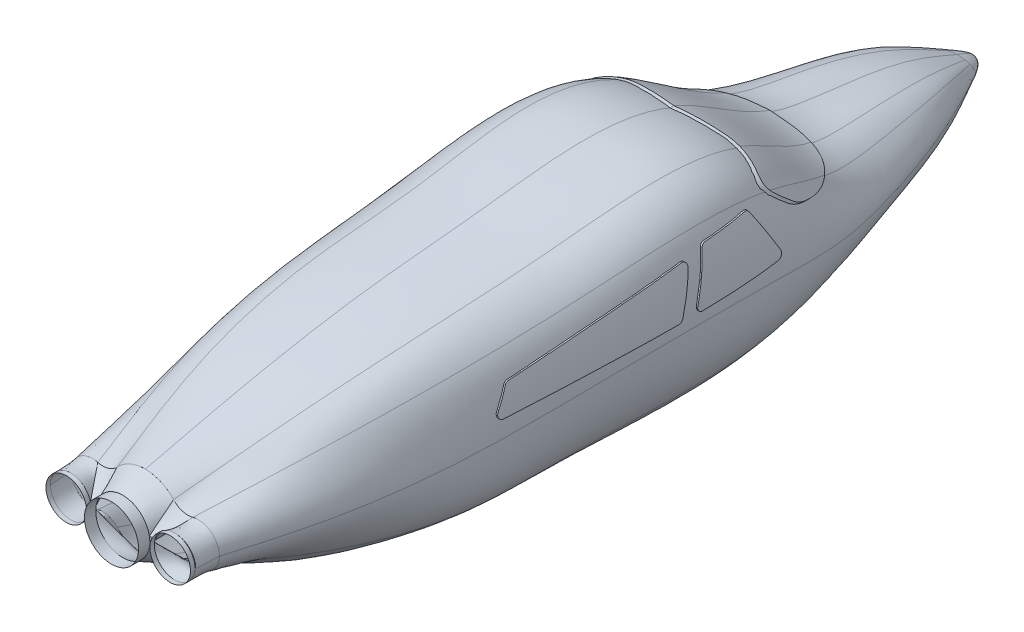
SolidWorks part; units mm, degrees
ref_plane "X Y" through (0, 0, 0) normal (0, 0, 1) x (1, 0, 0)
ref_plane "X Z" through (0, 0, 0) normal (0, 1, 0) x (1, 0, 0)
ref_plane "Y Z" through (0, 0, 0) normal (1, 0, 0) x (0, 0, -1)
sketch "Sketch1" plane through (0, 0, 0) normal (0, 0, 1) x (1, 0, 0)
  line L0 (0, 415.343) -> (0, -411.6511) construction
  spline_without_curve S0
  spline_without_curve S1
  dimension "D1" = 469.9
  dimension "D2" = 381
  dimension "D3" = 304.8
  dimension "D4" = 431.8
  dimension "D5" = 508
  dimension "D6" = 609.6
  dimension "D7" = 508
  dimension "D8" = 243.7461
  dimension "D9" = 482.6
  dimension "D10" = 381
  dimension "D11" = 495.3
ref_plane "Plane4" through (0, 0, -609.6) normal (0, 0, 1) x (1, 0, 0)
sketch "Sketch2" plane through (0, 0, -609.6) normal (0, 0, 1) x (1, 0, 0)
  line L0 (0, 485.4495) -> (0, -511.3457) construction
  line L1 (0, -1034.0087) -> (0, 1034.0087) construction
  spline_without_curve S0
  spline_without_curve S2
  dimension "D1" = 406.4
  dimension "D2" = 533.4
  dimension "D3" = 635
  dimension "D4" = 482.6
  dimension "D5" = 218.6384
  dimension "D6" = 533.4
  dimension "D7" = 533.4
  dimension "D8" = 431.8
  dimension "D9" = 355.6
  dimension "D10" = 457.2
  dimension "D11" = 533.4
ref_plane "Plane5" through (0, 0, 711.2) normal (0, 0, 1) x (1, 0, 0)
sketch "Sketch3" plane through (0, 0, 711.2) normal (0, 0, 1) x (1, 0, 0)
  line L0 (0, 415.343) -> (0, -411.6511) construction
  line L1 (0, 458.3194) -> (0, -495.3) construction
  line L2 (0, 485.4495) -> (0, -511.3457) construction
  line L3 (0, -1034.0087) -> (0, 1034.0087) construction
  spline S0 degree 3 poles (0, 346.0488) (119.0606, 346.0488) (305.7826, 333.6607) (469.0361, 162.1894) (572.0146, -25.9935) (445.0329, -234.3025) (260.4065, -410.1235) (88.1892, -408.5658) (0, -407.7681) knots 0 0 0 0 0.236281 0.37101 0.483193 0.654144 0.822894 1 1 1 1
  spline S2 degree 3 poles (0, 346.0488) (-119.0606, 346.0488) (-305.7826, 333.6607) (-469.0361, 162.1894) (-572.0146, -25.9935) (-445.0329, -234.3025) (-260.4065, -410.1235) (-88.1892, -408.5658) (0, -407.7681) knots 0 0 0 0 0.236281 0.37101 0.483193 0.654144 0.822894 1 1 1 1
  dimension "D1" = 332.0002
  dimension "D2" = 469.9327
  dimension "D3" = 437.8553
  dimension "D4" = 251.8069
  dimension "D5" = 378.8985
  dimension "D6" = 224.9274
  dimension "D7" = 407.7681
  dimension "D8" = 346.0488
  dimension "D9" = 281.8942
  dimension "D10" = 147.1695
  dimension "D11" = 534.0873
ref_plane "Plane6" through (0, 0, 1270) normal (0, 0, 1) x (1, 0, 0)
ref_plane "Plane7" through (0, 0, -1727.2) normal (0, 0, 1) x (1, 0, 0)
ref_plane "Plane8" through (0, 0, -2235.2) normal (0, 0, 1) x (1, 0, 0)
ref_plane "Plane9" through (0, 0, -2540) normal (0, 0, 1) x (1, 0, 0)
ref_plane "Plane10" through (0, 0, -3302) normal (0, 0, 1) x (1, 0, 0)
ref_plane "Plane11" through (0, 0, -2667) normal (0, 0, 1) x (1, 0, 0)
ref_plane "Plane12" through (0, 0, -3048) normal (0, 0, 1) x (1, 0, 0)
ref_plane "Plane13" through (0, -101.6, 0) normal (0, 1, 0) x (-1, 0, 0)
sketch "Sketch14" plane through (0, 0, -3048) normal (0, 0, 1) x (1, 0, 0)
  line L0 (0, 442.2225) -> (0, -479.5548) construction
  line L1 (0, -1034.0087) -> (0, 1034.0087) construction
  spline S0 degree 3 poles (0, 50.8) (-33.798, 50.8) (-93.5832, 46.4248) (-178.5372, 34.1155) (-258.9841, -43.1097) (-225.5456, -160.8389) (-135.6172, -254.6) (-55.0173, -254.2434) (0, -254) knots 0 0 0 0 0.160811 0.284888 0.398377 0.642444 0.755933 1 1 1 1
  spline S1 degree 3 poles (0, 50.8) (33.798, 50.8) (93.5832, 46.4248) (178.5372, 34.1155) (258.9841, -43.1097) (225.5456, -160.8389) (135.6172, -254.6) (55.0173, -254.2434) (0, -254) knots 0 0 0 0 0.160811 0.284888 0.398377 0.642444 0.755933 1 1 1 1
  dimension "D1" = 101.6
  dimension "D2" = 177.8
  dimension "D3" = 228.6
  dimension "D4" = 152.4
  dimension "D5" = 203.2
  dimension "D6" = 304.8
  dimension "D7" = 6.35
  dimension "D8" = 25.4
  dimension "D9" = 76.2
  dimension "D10" = 25.4
  dimension "D11" = 254
  dimension "D12" = 76.2
sketch "Sketch12" plane through (0, 0, -3302) normal (0, 0, 1) x (1, 0, 0)
  line L0 (0, 246.9903) -> (0, -303.9556) construction
  line L1 (0, -1034.0087) -> (0, 1034.0087) construction
  spline S0 degree 3 poles (0, -48.26) (-17.1488, -49.3263) (-43.2051, -50.9464) (-79.1439, -59.6708) (-115.1153, -88.4256) (-79.6329, -134.0728) (-39.0727, -144.0118) (-13.0363, -152.4) (0, -152.4) knots 0 0 0 0 0.209683 0.318597 0.46613 0.671883 0.840419 1 1 1 1
  spline S1 degree 3 poles (0, -48.26) (17.1488, -49.3263) (43.2051, -50.9464) (79.1439, -59.6708) (115.1153, -88.4256) (79.6329, -134.0728) (39.0727, -144.0118) (13.0363, -152.4) (0, -152.4) knots 0 0 0 0 0.209683 0.318597 0.46613 0.671883 0.840419 1 1 1 1
  dimension "D1" = 50.8
  dimension "D2" = 76.2
  dimension "D3" = 101.6
  dimension "D4" = 38.1
  dimension "D5" = 76.2
  dimension "D6" = 152.4
  dimension "D7" = 104.14
  dimension "D8" = 99.06
  dimension "D9" = 12.7
  dimension "D10" = 7.62
  dimension "D11" = 22.86
  dimension "D12" = 38.1
sketch "Sketch11" plane through (0, 0, -2540) normal (0, 0, 1) x (1, 0, 0)
  line L0 (0, 433.9908) -> (0, -487.7864) construction
  line L1 (1322.1171, 0) -> (-1322.1171, 0) construction
  line L2 (0, -1034.0087) -> (0, 1034.0087) construction
  spline_without_curve S0
  spline_without_curve S1
  dimension "D1" = 228.6
  dimension "D2" = 355.6
  dimension "D3" = 419.1
  dimension "D4" = 177.8
  dimension "D5" = 355.6
  dimension "D6" = 406.4
  dimension "D7" = 381
  dimension "D8" = 254
  dimension "D9" = 101.6
  dimension "D10" = 114.3
  dimension "D11" = 546.1
  dimension "D12" = 177.8
sketch "Sketch4" plane through (0, 0, 1270) normal (0, 0, 1) x (1, 0, 0)
  line L0 (0, 458.3194) -> (0, -511.3457) construction
  line L2 (0, 458.3194) -> (0, -495.3) construction
  line L4 (0, -1034.0087) -> (0, 1034.0087) construction
  line L5 (1322.1171, 0) -> (-1322.1171, 0) construction
  arc A0 (0, -216.2056) -> (158.6602, -146.8734) centre (0, 0) ccw
  arc A1 (-267.9146, 114.991) -> (-416.8911, 0) centre (-298.0236, 0) ccw
  arc A2 (158.6602, 146.8734) -> (0, 216.2056) centre (0, 0) ccw
  arc A3 (158.6602, 146.8734) -> (267.9146, 114.991) centre (239.88, 222.0595) ccw
  arc A4 (158.6602, -146.8734) -> (267.9146, -114.991) centre (239.88, -222.0595) cw
  arc A5 (267.9146, -114.991) -> (416.8911, 0) centre (298.0236, 0) ccw
  arc A6 (-267.9146, -114.991) -> (-416.8911, 0) centre (-298.0236, 0) cw
  arc A7 (-158.6602, -146.8734) -> (-267.9146, -114.991) centre (-239.88, -222.0595) ccw
  arc A8 (267.9146, 114.991) -> (416.8911, 0) centre (298.0236, 0) cw
  arc A9 (-158.6602, 146.8734) -> (-267.9146, 114.991) centre (-239.88, 222.0595) cw
  arc A10 (-158.6602, 146.8734) -> (0, 216.2056) centre (0, 0) cw
  arc A11 (0, -216.2056) -> (-158.6602, -146.8734) centre (0, 0) cw
  dimension "D1" = 216.2056
  dimension "D2" = 110.6779
  dimension "D4" = 239.88
  dimension "D5" = 118.8675
  dimension "D6" = 833.7821
  dimension "D3" = 298.0236
sketch "Sketch6" plane through (0, 0, -1727.2) normal (0, 0, 1) x (1, 0, 0)
  line L0 (0, 725.6789) -> (0, -740.6847) construction
  line L1 (0, -1034.0087) -> (0, 1034.0087) construction
  line L2 (1322.1171, 0) -> (-1322.1171, 0) construction
  spline_without_curve S0
  spline_without_curve S1
  dimension "D1" = 254
  dimension "D2" = 457.2
  dimension "D3" = 355.6
  dimension "D4" = 545.3188
  dimension "D5" = 609.6
  dimension "D6" = 1016
  dimension "D7" = 482.6
  dimension "D8" = 469.9
  dimension "D9" = 385.8968
  dimension "D10" = 330.2
  dimension "D11" = 495.3
sketch "Sketch7" plane through (0, 0, -2235.2) normal (0, 0, 1) x (1, 0, 0)
  line L0 (0, 725.6789) -> (0, -740.6847) construction
  line L1 (1322.1171, 0) -> (-1322.1171, 0) construction
  line L2 (0, 821.126) -> (0, -740.6847) construction
  spline S0 degree 3 poles (0, 203.2) (-67.8535, 203.2) (-206.4809, 179.8343) (-391.9822, 134.2052) (-548.0297, -51.3601) (-460.9038, -342.9535) (-211.4472, -438.7381) (-68.2248, -457.2) (0, -457.2) knots 0 0 0 0 0.154677 0.318595 0.416872 0.673725 0.845323 1 1 1 1
  spline S1 degree 3 poles (0, 203.2) (67.8535, 203.2) (206.4809, 179.8343) (391.9822, 134.2052) (548.0297, -51.3601) (460.9038, -342.9535) (211.4472, -438.7381) (68.2248, -457.2) (0, -457.2) knots 0 0 0 0 0.154677 0.318595 0.416872 0.673725 0.845323 1 1 1 1
  dimension "D1" = 203.2
  dimension "D2" = 177.8
  dimension "D3" = 101.6
  dimension "D4" = 330.2
  dimension "D5" = 431.8
  dimension "D6" = 660.4
  dimension "D7" = 203.2
  dimension "D8" = 406.4
  dimension "D9" = 203.2
  dimension "D10" = 406.4
  dimension "D11" = 487.68
surface "Surface-Loft1"
surface "Surface-Offset1" parameters "D1"=7.62
sketch "Sketch21" plane through (0, 0, 0) normal (1, 0, 0) x (0, 0, -1)
  line L0 (1145.1909, 315.7519) -> (185.5688, 213.9586)
  line L1 (127.1182, 69.9003) -> (1081.8502, 69.9003)
  line L2 (1105.9112, 87.1622) -> (1171.9312, 282.3555)
  line L3 (1266.4235, 323.9003) -> (1191.8569, 103.4384)
  line L4 (1215.9179, 69.9003) -> (1675.0617, 69.9003)
  line L5 (1697.0588, 108.0003) -> (1566.4148, 334.2823)
  line L6 (1543.8358, 346.9756) -> (1289.9025, 341.1555)
  line L7 (166.9954, 202.6101) -> (105.8655, 109.2101)
  arc A0 (105.8655, 109.2101) -> (127.1182, 69.9003) centre (127.1182, 95.3003) ccw
  arc A1 (1081.8502, 69.9003) -> (1105.9112, 87.1622) centre (1081.8502, 95.3003) ccw
  arc A2 (1171.9312, 282.3555) -> (1145.1909, 315.7519) centre (1147.8702, 290.4936) ccw
  arc A3 (1191.8569, 103.4384) -> (1215.9179, 69.9003) centre (1215.9179, 95.3003) ccw
  arc A4 (1675.0617, 69.9003) -> (1697.0588, 108.0003) centre (1675.0617, 95.3003) ccw
  arc A5 (1566.4148, 334.2823) -> (1543.8358, 346.9756) centre (1544.4178, 321.5823) ccw
  arc A6 (1289.9025, 341.1555) -> (1266.4235, 323.9003) centre (1290.4845, 315.7622) ccw
  arc A7 (166.9954, 202.6101) -> (185.5688, 213.9586) centre (188.2481, 188.7003) cw
  dimension "D1" = 25.4
  dimension "D2" = 110
  dimension "D3" = 25.4
  dimension "D4" = 25.4
  dimension "D5" = 254
  dimension "D6" = 459.1439
  dimension "D7" = 60
  dimension "D8" = 206.056
  dimension "D9" = 76.2
  dimension "D10" = 254
  dimension "D11" = 954.732
extrude "Boss-Extrude2" add sketch "Sketch21" along normal up to surface and the other way up to surface
sketch "Sketch13" plane through (0, 0, -2667) normal (0, 0, 1) x (1, 0, 0)
  line L0 (1322.1171, 0) -> (-1322.1171, 0) construction
  line L1 (-274.0636, -39.5333) -> (279.8657, -39.5333)
  line L2 (-274.0636, -39.5333) -> (-274.0636, -152.4)
  line L3 (279.8657, -152.4) -> (-274.0636, -152.4)
  line L4 (279.8657, -152.4) -> (279.8657, -39.5333)
  line L5 (0, -48.26) -> (0, 585.322) construction
  circle A0 centre (-254, -50.1577) radius 6.35
  circle A1 centre (254, -50.1577) radius 6.35
  circle A2 centre (0, -90.3333) radius 6.35
  dimension "D4" = 12.7
  dimension "D8" = 12.7
  dimension "D9" = 50.8
  dimension "D1" = 508
  dimension "D2" = 50.1577
  dimension "D3" = 254
  dimension "D5" = 152.4
  dimension "D6" = 112.8667
  dimension "D7" = 553.9294
extrude "Base-Extrude" add sketch "Sketch13" along normal blind 25.4
sketch "Sketch24" plane through (0, 0, -3302) normal (0, 0, 1) x (1, 0, 0)
  line L0 (101.9737, -93.9513) -> (-101.9737, -93.9513) construction
  spline S1 degree 3 poles (-404.2132, -2992.447) (343.4168, -266.5796) (220.0991, -74.8984) (38.9425, -51.5332) (38.4517, -51.4702) (36.7861, -51.2597) (34.9577, -51.0442) (33.5074, -50.8829) (31.5161, -50.6628) (29.6783, -50.4747) (25.9944, -50.1225) (24.1483, -49.9585) (20.4495, -49.6497) (18.5968, -49.5049) (14.8864, -49.2299) (13.0287, -49.0996) (9.31, -48.8487) (7.449, -48.7281) (-194.3079, -35.9165) (-403.7516, -51.0106) (402.4529, 2889.5077) knots -12.305338 -12.305338 -12.305338 -12.305338 0.117404 0.125 0.125 0.151071 0.239192 0.25 0.25 0.375 0.375 0.5 0.5 0.625 0.625 0.75 0.75 0.875 0.875 14.295579 14.295579 14.295579 14.295579 only from (44.2798, -52.2738) to (0, -48.26) construction
  spline S13 degree 3 poles (653.9186, -2997.6092) (257.4194, -330.89) (164.8781, -92.1873) (68.7014, -57.8473) (67.5427, -57.4378) (66.3835, -57.0576) (64.3363, -56.4257) (63.1752, -56.0911) (62.0126, -55.7788) (61.0514, -55.5223) (59.8875, -55.2282) (58.7216, -54.9531) (57.957, -54.7759) (56.7897, -54.5127) (55.6201, -54.266) (54.1126, -53.9596) (52.9395, -53.7311) (51.7634, -53.514) (51.1871, -53.4094) (50.9407, -53.3651) (49.7624, -53.1551) (48.7754, -52.9862) (-159.0774, -18.7604) (-460.6997, -260.2888) (400.0918, 2880.8937) knots -10.23414 -10.23414 -10.23414 -10.23414 0.125 0.125 0.142585 0.25 0.25 0.363175 0.375 0.375 0.466506 0.5 0.5 0.548449 0.625 0.625 0.709334 0.75 0.75 0.770538 0.776147 0.875 0.875 22.728706 22.728706 22.728706 22.728706 only from (72.3391, -59.2397) to (44.2798, -52.2738) construction
  spline S14 degree 3 poles (2250.9645, 1990.387) (-485.9232, -340.4686) (98.0169, -188.4941) (102.1391, -91.8047) (102.1384, -90.9861) (102.1359, -90.7604) (102.1273, -90.428) (102.0977, -89.6524) (102.0376, -88.9546) (101.8744, -87.6926) (101.7114, -86.7839) (101.4852, -85.8862) (101.1788, -84.7557) (100.8745, -83.8722) (100.1528, -82.1304) (99.7355, -81.2721) (99.1013, -80.1287) (98.6148, -79.289) (98.079, -78.4636) (97.3088, -77.3524) (96.7106, -76.5475) (96.0704, -75.7586) (95.2338, -74.7518) (94.5417, -73.9839) (93.6614, -73.0756) (92.9268, -72.3289) (92.1582, -71.6002) (90.7407, -70.3226) (89.9188, -69.6276) (88.7157, -68.6681) (87.859, -68.0016) (86.9802, -67.3558) (85.5756, -66.3559) (84.6666, -65.7439) (83.1568, -64.7793) (82.2253, -64.2043) (81.2835, -63.6527) (79.995, -62.9123) (79.0417, -62.3933) (77.4576, -61.5753) (76.4992, -61.0979) (75.5412, -60.6466) (74.5859, -60.205) (73.6598, -59.7928) (-40.1079, -11.8843) (-153.9222, -286.1377) (-869.8803, 2772.3542) knots -6.390642 -6.390642 -6.390642 -6.390642 0.017799 0.0625 0.0625 0.07272 0.077666 0.084868 0.125 0.125 0.171031 0.1875 0.1875 0.25 0.25 0.3125 0.3125 0.334619 0.375 0.375 0.419764 0.4375 0.4375 0.5 0.5 0.513155 0.5625 0.5625 0.625 0.625 0.651348 0.6875 0.6875 0.75 0.75 0.789769 0.8125 0.8125 0.875 0.875 0.916022 0.9375 0.9375 0.978361 0.997939 8.362955 8.362955 8.362955 8.362955 only from (101.9737, -93.9513) to (72.3391, -59.2397) construction
  spline S15 degree 3 poles (-173.187, -3108.608) (-185.3077, 97.9733) (-34.016, -197.3036) (74.0675, -130.9547) (74.9675, -130.3757) (75.8642, -129.7688) (75.9977, -129.6783) (76.3815, -129.4167) (77.2763, -128.7936) (78.0667, -128.2192) (79.0585, -127.4789) (79.9422, -126.8023) (80.8175, -126.1008) (81.6406, -125.4276) (82.3604, -124.8258) (83.2164, -124.0832) (83.6483, -123.6998) (84.638, -122.8149) (85.4713, -122.0362) (87.1033, -120.4407) (87.902, -119.6239) (89.4577, -117.9571) (90.2146, -117.1069) (91.6794, -115.3781) (92.3874, -114.4993) (93.747, -112.7178) (94.3987, -111.8151) (95.6386, -109.9905) (96.2269, -109.0686) (97.3328, -107.2102) (97.8504, -106.2737) (98.8078, -104.391) (99.2475, -103.4448) (100.0419, -101.5471) (100.3966, -100.5958) (101.0137, -98.6927) (101.276, -97.7409) (118.6116, -20.3197) (-186.9298, 42.1584) (-2699.1327, -1138.9665) knots -7.358098 -7.358098 -7.358098 -7.358098 0.0625 0.0625 0.122755 0.125 0.125 0.132057 0.151767 0.1875 0.1875 0.221631 0.25 0.25 0.280713 0.301964 0.3125 0.3125 0.375 0.375 0.4375 0.4375 0.5 0.5 0.5625 0.5625 0.625 0.625 0.6875 0.6875 0.75 0.75 0.8125 0.8125 0.875 0.875 0.9375 0.9375 5.97066 5.97066 5.97066 5.97066 only from (70.4787, -133.0775) to (101.9737, -93.9513) construction
  spline S16 degree 3 poles (-173.1262, -3124.3744) (-184.7745, -162.5389) (-57.498, -172.5086) (46.6446, -142.353) (47.9668, -141.9691) (49.1143, -141.6295) (51.4032, -140.9312) (52.5445, -140.5725) (54.8206, -139.8277) (55.9554, -139.4416) (57.2365, -138.9842) (58.3673, -138.578) (59.4945, -138.1535) (60.9308, -137.5868) (62.0532, -137.1344) (63.1719, -136.6584) (64.9464, -135.8775) (66.0587, -135.3604) (67.7067, -134.5466) (158.4537, -88.4569) (220.3906, 173.023) (134.514, 2860.8299) knots -11.187137 -11.187137 -11.187137 -11.187137 0.106328 0.125 0.125 0.25 0.25 0.375 0.375 0.5 0.5 0.516563 0.625 0.625 0.676295 0.75 0.75 0.875 0.875 0.935894 11.12994 11.12994 11.12994 11.12994 only from (43.357, -143.2928) to (70.4787, -133.0775) construction
  spline S17 degree 3 poles (-427.8123, 2808.0412) (-223.1565, 47.8229) (-97.4549, -160.6907) (7.4048, -152.0114) (9.2431, -151.7889) (12.9059, -151.2316) (14.7304, -150.8967) (18.366, -150.1412) (20.1772, -149.7206) (23.7869, -148.8207) (25.5854, -148.3414) (27.4468, -147.8271) (29.2074, -147.34) (30.9939, -146.8289) (32.7065, -146.3349) (34.1475, -145.9192) (35.9239, -145.4034) (37.695, -144.8957) (38.0761, -144.7868) (38.3701, -144.7029) (39.7433, -144.312) (144.6243, -114.7845) (228.3803, -85.0478) (134.9429, 2847.3887) knots -6.85183 -6.85183 -6.85183 -6.85183 0.125 0.125 0.25 0.25 0.375 0.375 0.5 0.5 0.625 0.625 0.6298 0.747788 0.75 0.75 0.848929 0.875 0.875 0.875845 0.895766 0.972031 8.304617 8.304617 8.304617 8.304617 only from (0, -152.4) to (43.357, -143.2928) construction
  spline S18 degree 3 poles (44.2798, -52.2738) (42.5801, -52.0201) (40.7642, -51.7682) (38.9425, -51.5332) (38.4517, -51.4702) (36.7861, -51.2597) (34.9577, -51.0442) (33.5074, -50.8829) (31.5161, -50.6628) (29.6783, -50.4747) (25.9944, -50.1225) (24.1483, -49.9585) (20.4495, -49.6497) (18.5968, -49.5049) (14.8864, -49.2299) (13.0287, -49.0996) (9.31, -48.8487) (7.449, -48.7281) (3.7253, -48.4916) (1.8627, -48.3758) (0, -48.26) knots 0 0 0 0 0.117404 0.125 0.125 0.151071 0.239192 0.25 0.25 0.375 0.375 0.5 0.5 0.625 0.625 0.75 0.75 0.875 0.875 1 1 1 1
  spline S19 degree 3 poles (72.3391, -59.2397) (71.181, -58.7626) (70.0229, -58.3192) (68.7014, -57.8473) (67.5427, -57.4378) (66.3835, -57.0576) (64.3363, -56.4257) (63.1752, -56.0911) (62.0126, -55.7788) (61.0514, -55.5223) (59.8875, -55.2282) (58.7216, -54.9531) (57.957, -54.7759) (56.7897, -54.5127) (55.6201, -54.266) (54.1126, -53.9596) (52.9395, -53.7311) (51.7634, -53.514) (51.1871, -53.4094) (50.9407, -53.3651) (49.7624, -53.1551) (48.7754, -52.9862) (46.6559, -52.6372) (45.4692, -52.4514) (44.2798, -52.2738) knots 0 0 0 0 0.125 0.125 0.142585 0.25 0.25 0.363175 0.375 0.375 0.466506 0.5 0.5 0.548449 0.625 0.625 0.709334 0.75 0.75 0.770538 0.776147 0.875 0.875 1 1 1 1
  spline S20 degree 3 poles (101.9737, -93.9513) (102.0049, -93.6828) (102.0992, -92.7412) (102.1391, -91.8047) (102.1384, -90.9861) (102.1359, -90.7604) (102.1273, -90.428) (102.0977, -89.6524) (102.0376, -88.9546) (101.8744, -87.6926) (101.7114, -86.7839) (101.4852, -85.8862) (101.1788, -84.7557) (100.8745, -83.8722) (100.1528, -82.1304) (99.7355, -81.2721) (99.1013, -80.1287) (98.6148, -79.289) (98.079, -78.4636) (97.3088, -77.3524) (96.7106, -76.5475) (96.0704, -75.7586) (95.2338, -74.7518) (94.5417, -73.9839) (93.6614, -73.0756) (92.9268, -72.3289) (92.1582, -71.6002) (90.7407, -70.3226) (89.9188, -69.6276) (88.7157, -68.6681) (87.859, -68.0016) (86.9802, -67.3558) (85.5756, -66.3559) (84.6666, -65.7439) (83.1568, -64.7793) (82.2253, -64.2043) (81.2835, -63.6527) (79.995, -62.9123) (79.0417, -62.3933) (77.4576, -61.5753) (76.4992, -61.0979) (75.5412, -60.6466) (74.5859, -60.205) (73.6598, -59.7928) (72.7022, -59.3896) (72.3707, -59.2527) (72.3391, -59.2397) knots 0 0 0 0 0.017799 0.0625 0.0625 0.07272 0.077666 0.084868 0.125 0.125 0.171031 0.1875 0.1875 0.25 0.25 0.3125 0.3125 0.334619 0.375 0.375 0.419764 0.4375 0.4375 0.5 0.5 0.513155 0.5625 0.5625 0.625 0.625 0.651348 0.6875 0.6875 0.75 0.75 0.789769 0.8125 0.8125 0.875 0.875 0.916022 0.9375 0.9375 0.978361 0.997939 1 1 1 1
  spline S21 degree 3 poles (70.4787, -133.0775) (71.3878, -132.5721) (72.2939, -132.0434) (74.0675, -130.9547) (74.9675, -130.3757) (75.8642, -129.7688) (75.9977, -129.6783) (76.3815, -129.4167) (77.2763, -128.7936) (78.0667, -128.2192) (79.0585, -127.4789) (79.9422, -126.8023) (80.8175, -126.1008) (81.6406, -125.4276) (82.3604, -124.8258) (83.2164, -124.0832) (83.6483, -123.6998) (84.638, -122.8149) (85.4713, -122.0362) (87.1033, -120.4407) (87.902, -119.6239) (89.4577, -117.9571) (90.2146, -117.1069) (91.6794, -115.3781) (92.3874, -114.4993) (93.747, -112.7178) (94.3987, -111.8151) (95.6386, -109.9905) (96.2269, -109.0686) (97.3328, -107.2102) (97.8504, -106.2737) (98.8078, -104.391) (99.2475, -103.4448) (100.0419, -101.5471) (100.3966, -100.5958) (101.0137, -98.6927) (101.276, -97.7409) (101.7013, -95.8417) (101.8642, -94.8943) (101.9737, -93.9513) knots 0 0 0 0 0.0625 0.0625 0.122755 0.125 0.125 0.132057 0.151767 0.1875 0.1875 0.221631 0.25 0.25 0.280713 0.301964 0.3125 0.3125 0.375 0.375 0.4375 0.4375 0.5 0.5 0.5625 0.5625 0.625 0.625 0.6875 0.6875 0.75 0.75 0.8125 0.8125 0.875 0.875 0.9375 0.9375 1 1 1 1
  spline S22 degree 3 poles (43.357, -143.2928) (44.3402, -143.0146) (45.4938, -142.6862) (46.6446, -142.353) (47.9668, -141.9691) (49.1143, -141.6295) (51.4032, -140.9312) (52.5445, -140.5725) (54.8206, -139.8277) (55.9554, -139.4416) (57.2365, -138.9842) (58.3673, -138.578) (59.4945, -138.1535) (60.9308, -137.5868) (62.0532, -137.1344) (63.1719, -136.6584) (64.9464, -135.8775) (66.0587, -135.3604) (67.7067, -134.5466) (68.8129, -133.9848) (69.9147, -133.391) (70.4787, -133.0775) knots 0 0 0 0 0.106328 0.125 0.125 0.25 0.25 0.375 0.375 0.5 0.5 0.516563 0.625 0.625 0.676295 0.75 0.75 0.875 0.875 0.935894 1 1 1 1
  spline S23 degree 3 poles (0, -152.4) (1.8605, -152.4) (3.7135, -152.3169) (7.4048, -152.0114) (9.2431, -151.7889) (12.9059, -151.2316) (14.7304, -150.8967) (18.366, -150.1412) (20.1772, -149.7206) (23.7869, -148.8207) (25.5854, -148.3414) (27.4468, -147.8271) (29.2074, -147.34) (30.9939, -146.8289) (32.7065, -146.3349) (34.1475, -145.9192) (35.9239, -145.4034) (37.695, -144.8957) (38.0761, -144.7868) (38.3701, -144.7029) (39.7433, -144.312) (41.4961, -143.8185) (42.9636, -143.4042) (43.357, -143.2928) knots 0 0 0 0 0.125 0.125 0.25 0.25 0.375 0.375 0.5 0.5 0.625 0.625 0.6298 0.747788 0.75 0.75 0.848929 0.875 0.875 0.875845 0.895766 0.972031 1 1 1 1
  spline S24 degree 3 poles (-402.4342, 2889.4395) (403.7484, -51.0104) (194.3063, -35.9166) (-7.449, -48.7281) (-9.31, -48.8487) (-13.0287, -49.0996) (-14.8864, -49.2299) (-18.5968, -49.5049) (-20.4495, -49.6497) (-24.1483, -49.9585) (-25.9944, -50.1225) (-29.6783, -50.4747) (-31.5161, -50.6628) (-33.5074, -50.8829) (-34.9577, -51.0442) (-36.7861, -51.2597) (-38.4517, -51.4702) (-38.9425, -51.5332) (-220.0981, -74.8983) (-343.4154, -266.5775) (404.2004, -2992.4004) knots -13.295475 -13.295475 -13.295475 -13.295475 0.125 0.125 0.25 0.25 0.375 0.375 0.5 0.5 0.625 0.625 0.75 0.75 0.760808 0.848929 0.875 0.875 0.882596 13.305267 13.305267 13.305267 13.305267 only from (0, -48.26) to (-44.2798, -52.2738) construction
  spline S25 degree 3 poles (-400.1049, 2880.9413) (460.7027, -260.2912) (159.0784, -18.7603) (-48.7754, -52.9862) (-49.7624, -53.1551) (-50.9407, -53.3651) (-51.1871, -53.4094) (-51.7634, -53.514) (-52.9395, -53.7311) (-54.1126, -53.9596) (-55.6201, -54.266) (-56.7897, -54.5127) (-57.957, -54.7759) (-58.7216, -54.9531) (-59.8875, -55.2282) (-61.0514, -55.5223) (-62.0126, -55.7788) (-63.1752, -56.0911) (-64.3363, -56.4257) (-66.3835, -57.0576) (-67.5427, -57.4378) (-68.7014, -57.8473) (-164.8786, -92.1875) (-257.4202, -330.8922) (-653.9241, -2997.6459) knots -21.728816 -21.728816 -21.728816 -21.728816 0.125 0.125 0.223853 0.229462 0.25 0.25 0.290666 0.375 0.375 0.451551 0.5 0.5 0.533494 0.625 0.625 0.636825 0.75 0.75 0.857415 0.875 0.875 11.234188 11.234188 11.234188 11.234188 only from (-44.2798, -52.2738) to (-72.3391, -59.2397) construction
  spline S26 degree 3 poles (869.893, 2772.4068) (153.9235, -286.1408) (40.1086, -11.884) (-73.6598, -59.7928) (-74.5859, -60.205) (-75.5412, -60.6466) (-76.4992, -61.0979) (-77.4576, -61.5753) (-79.0417, -62.3933) (-79.995, -62.9123) (-81.2835, -63.6527) (-82.2253, -64.2043) (-83.1568, -64.7793) (-84.6666, -65.7439) (-85.5756, -66.3559) (-86.9802, -67.3558) (-87.859, -68.0016) (-88.7157, -68.6681) (-89.9188, -69.6276) (-90.7407, -70.3226) (-92.1582, -71.6002) (-92.9268, -72.3289) (-93.6614, -73.0756) (-94.5417, -73.9839) (-95.2338, -74.7518) (-96.0704, -75.7586) (-96.7106, -76.5475) (-97.3088, -77.3524) (-98.079, -78.4636) (-98.6148, -79.289) (-99.1013, -80.1287) (-99.7355, -81.2721) (-100.1528, -82.1304) (-100.8745, -83.8722) (-101.1788, -84.7557) (-101.4852, -85.8862) (-101.7114, -86.7839) (-101.8744, -87.6926) (-102.0376, -88.9546) (-102.0977, -89.6524) (-102.1273, -90.428) (-102.1359, -90.7604) (-102.1384, -90.9861) (-102.1391, -91.8047) (-98.0169, -188.4935) (485.9166, -340.4669) (-2250.9182, 1990.3476) knots -7.362997 -7.362997 -7.362997 -7.362997 0.002061 0.021639 0.0625 0.0625 0.083978 0.125 0.125 0.1875 0.1875 0.210231 0.25 0.25 0.3125 0.3125 0.348652 0.375 0.375 0.4375 0.4375 0.486845 0.5 0.5 0.5625 0.5625 0.580236 0.625 0.625 0.665381 0.6875 0.6875 0.75 0.75 0.8125 0.8125 0.828969 0.875 0.875 0.915132 0.922334 0.92728 0.9375 0.9375 0.982201 7.390606 7.390606 7.390606 7.390606 only from (-72.3391, -59.2397) to (-101.9737, -93.9513) construction
  spline S27 degree 3 poles (2699.1221, -1138.9616) (186.929, 42.1583) (-118.6115, -20.3198) (-101.276, -97.7409) (-101.0137, -98.6927) (-100.3966, -100.5958) (-100.0419, -101.5471) (-99.2475, -103.4448) (-98.8078, -104.391) (-97.8504, -106.2737) (-97.3328, -107.2102) (-96.2269, -109.0686) (-95.6386, -109.9905) (-94.3987, -111.8151) (-93.747, -112.7178) (-92.3874, -114.4993) (-91.6794, -115.3781) (-90.2146, -117.1069) (-89.4577, -117.9571) (-87.902, -119.6239) (-87.1033, -120.4407) (-85.4713, -122.0362) (-84.638, -122.8149) (-83.6483, -123.6998) (-83.2164, -124.0832) (-82.3604, -124.8258) (-81.6406, -125.4276) (-80.8175, -126.1008) (-79.9422, -126.8023) (-79.0585, -127.4789) (-78.0667, -128.2192) (-77.2763, -128.7936) (-76.3815, -129.4167) (-75.9977, -129.6783) (-75.8642, -129.7688) (-74.9675, -130.3757) (-74.0675, -130.9547) (34.0159, -197.3036) (185.3077, 97.9733) (173.187, -3108.6072) knots -4.970652 -4.970652 -4.970652 -4.970652 0.0625 0.0625 0.125 0.125 0.1875 0.1875 0.25 0.25 0.3125 0.3125 0.375 0.375 0.4375 0.4375 0.5 0.5 0.5625 0.5625 0.625 0.625 0.6875 0.6875 0.698036 0.719287 0.75 0.75 0.778369 0.8125 0.8125 0.848233 0.867943 0.875 0.875 0.877245 0.9375 0.9375 8.358097 8.358097 8.358097 8.358097 only from (-101.9737, -93.9513) to (-70.4787, -133.0775) construction
  spline S28 degree 3 poles (-134.5158, 2860.7728) (-220.3897, 173.0193) (-158.453, -88.4572) (-67.7067, -134.5466) (-66.0587, -135.3604) (-64.9464, -135.8775) (-63.1719, -136.6584) (-62.0532, -137.1344) (-60.9308, -137.5868) (-59.4945, -138.1535) (-58.3673, -138.578) (-57.2365, -138.9842) (-55.9554, -139.4416) (-54.8206, -139.8277) (-52.5445, -140.5725) (-51.4032, -140.9312) (-49.1143, -141.6295) (-47.9668, -141.9691) (-46.6446, -142.353) (57.4987, -172.5088) (184.7763, -162.5388) (173.1259, -3124.4367) knots -10.129867 -10.129867 -10.129867 -10.129867 0.064106 0.125 0.125 0.25 0.25 0.323705 0.375 0.375 0.483437 0.5 0.5 0.625 0.625 0.75 0.75 0.875 0.875 0.893672 12.187217 12.187217 12.187217 12.187217 only from (-70.4787, -133.0775) to (-43.357, -143.2928) construction
  spline S29 degree 3 poles (-134.9451, 2847.3202) (-228.379, -85.0482) (-144.6235, -114.7847) (-39.7433, -144.312) (-38.3701, -144.7029) (-38.0761, -144.7868) (-37.695, -144.8957) (-35.9239, -145.4034) (-34.1475, -145.9192) (-32.7065, -146.3349) (-30.9939, -146.8289) (-29.2074, -147.34) (-27.4468, -147.8271) (-25.5854, -148.3414) (-23.7869, -148.8207) (-20.1772, -149.7206) (-18.366, -150.1412) (-14.7304, -150.8967) (-12.9059, -151.2316) (-9.2431, -151.7889) (-7.4048, -152.0114) (97.4557, -160.6908) (223.1585, 47.8262) (427.8171, 2808.1057) knots -7.30456 -7.30456 -7.30456 -7.30456 0.027969 0.104234 0.124155 0.125 0.125 0.151071 0.25 0.25 0.252212 0.3702 0.375 0.375 0.5 0.5 0.625 0.625 0.75 0.75 0.875 0.875 7.851884 7.851884 7.851884 7.851884 only from (-43.357, -143.2928) to (0, -152.4) construction
  spline S30 degree 3 poles (0, -48.26) (-1.8627, -48.3758) (-3.7253, -48.4916) (-7.449, -48.7281) (-9.31, -48.8487) (-13.0287, -49.0996) (-14.8864, -49.2299) (-18.5968, -49.5049) (-20.4495, -49.6497) (-24.1483, -49.9585) (-25.9944, -50.1225) (-29.6783, -50.4747) (-31.5161, -50.6628) (-33.5074, -50.8829) (-34.9577, -51.0442) (-36.7861, -51.2597) (-38.4517, -51.4702) (-38.9425, -51.5332) (-40.7642, -51.7682) (-42.5801, -52.0201) (-44.2798, -52.2738) knots 0 0 0 0 0.125 0.125 0.25 0.25 0.375 0.375 0.5 0.5 0.625 0.625 0.75 0.75 0.760808 0.848929 0.875 0.875 0.882596 1 1 1 1
  spline S31 degree 3 poles (-44.2798, -52.2738) (-45.4692, -52.4514) (-46.6559, -52.6372) (-48.7754, -52.9862) (-49.7624, -53.1551) (-50.9407, -53.3651) (-51.1871, -53.4094) (-51.7634, -53.514) (-52.9395, -53.7311) (-54.1126, -53.9596) (-55.6201, -54.266) (-56.7897, -54.5127) (-57.957, -54.7759) (-58.7216, -54.9531) (-59.8875, -55.2282) (-61.0514, -55.5223) (-62.0126, -55.7788) (-63.1752, -56.0911) (-64.3363, -56.4257) (-66.3835, -57.0576) (-67.5427, -57.4378) (-68.7014, -57.8473) (-70.0229, -58.3192) (-71.181, -58.7626) (-72.3391, -59.2397) knots 0 0 0 0 0.125 0.125 0.223853 0.229462 0.25 0.25 0.290666 0.375 0.375 0.451551 0.5 0.5 0.533494 0.625 0.625 0.636825 0.75 0.75 0.857415 0.875 0.875 1 1 1 1
  spline S32 degree 3 poles (-72.3391, -59.2397) (-72.3707, -59.2527) (-72.7022, -59.3896) (-73.6598, -59.7928) (-74.5859, -60.205) (-75.5412, -60.6466) (-76.4992, -61.0979) (-77.4576, -61.5753) (-79.0417, -62.3933) (-79.995, -62.9123) (-81.2835, -63.6527) (-82.2253, -64.2043) (-83.1568, -64.7793) (-84.6666, -65.7439) (-85.5756, -66.3559) (-86.9802, -67.3558) (-87.859, -68.0016) (-88.7157, -68.6681) (-89.9188, -69.6276) (-90.7407, -70.3226) (-92.1582, -71.6002) (-92.9268, -72.3289) (-93.6614, -73.0756) (-94.5417, -73.9839) (-95.2338, -74.7518) (-96.0704, -75.7586) (-96.7106, -76.5475) (-97.3088, -77.3524) (-98.079, -78.4636) (-98.6148, -79.289) (-99.1013, -80.1287) (-99.7355, -81.2721) (-100.1528, -82.1304) (-100.8745, -83.8722) (-101.1788, -84.7557) (-101.4852, -85.8862) (-101.7114, -86.7839) (-101.8744, -87.6926) (-102.0376, -88.9546) (-102.0977, -89.6524) (-102.1273, -90.428) (-102.1359, -90.7604) (-102.1384, -90.9861) (-102.1391, -91.8047) (-102.0992, -92.7412) (-102.0049, -93.6828) (-101.9737, -93.9513) knots 0 0 0 0 0.002061 0.021639 0.0625 0.0625 0.083978 0.125 0.125 0.1875 0.1875 0.210231 0.25 0.25 0.3125 0.3125 0.348652 0.375 0.375 0.4375 0.4375 0.486845 0.5 0.5 0.5625 0.5625 0.580236 0.625 0.625 0.665381 0.6875 0.6875 0.75 0.75 0.8125 0.8125 0.828969 0.875 0.875 0.915132 0.922334 0.92728 0.9375 0.9375 0.982201 1 1 1 1
  spline S33 degree 3 poles (-101.9737, -93.9513) (-101.8642, -94.8943) (-101.7013, -95.8417) (-101.276, -97.7409) (-101.0137, -98.6927) (-100.3966, -100.5958) (-100.0419, -101.5471) (-99.2475, -103.4448) (-98.8078, -104.391) (-97.8504, -106.2737) (-97.3328, -107.2102) (-96.2269, -109.0686) (-95.6386, -109.9905) (-94.3987, -111.8151) (-93.747, -112.7178) (-92.3874, -114.4993) (-91.6794, -115.3781) (-90.2146, -117.1069) (-89.4577, -117.9571) (-87.902, -119.6239) (-87.1033, -120.4407) (-85.4713, -122.0362) (-84.638, -122.8149) (-83.6483, -123.6998) (-83.2164, -124.0832) (-82.3604, -124.8258) (-81.6406, -125.4276) (-80.8175, -126.1008) (-79.9422, -126.8023) (-79.0585, -127.4789) (-78.0667, -128.2192) (-77.2763, -128.7936) (-76.3815, -129.4167) (-75.9977, -129.6783) (-75.8642, -129.7688) (-74.9675, -130.3757) (-74.0675, -130.9547) (-72.2939, -132.0434) (-71.3878, -132.5721) (-70.4787, -133.0775) knots 0 0 0 0 0.0625 0.0625 0.125 0.125 0.1875 0.1875 0.25 0.25 0.3125 0.3125 0.375 0.375 0.4375 0.4375 0.5 0.5 0.5625 0.5625 0.625 0.625 0.6875 0.6875 0.698036 0.719287 0.75 0.75 0.778369 0.8125 0.8125 0.848233 0.867943 0.875 0.875 0.877245 0.9375 0.9375 1 1 1 1
  spline S34 degree 3 poles (-70.4787, -133.0775) (-69.9147, -133.391) (-68.8129, -133.9848) (-67.7067, -134.5466) (-66.0587, -135.3604) (-64.9464, -135.8775) (-63.1719, -136.6584) (-62.0532, -137.1344) (-60.9308, -137.5868) (-59.4945, -138.1535) (-58.3673, -138.578) (-57.2365, -138.9842) (-55.9554, -139.4416) (-54.8206, -139.8277) (-52.5445, -140.5725) (-51.4032, -140.9312) (-49.1143, -141.6295) (-47.9668, -141.9691) (-46.6446, -142.353) (-45.4938, -142.6862) (-44.3402, -143.0146) (-43.357, -143.2928) knots 0 0 0 0 0.064106 0.125 0.125 0.25 0.25 0.323705 0.375 0.375 0.483437 0.5 0.5 0.625 0.625 0.75 0.75 0.875 0.875 0.893672 1 1 1 1
  spline S35 degree 3 poles (-43.357, -143.2928) (-42.9636, -143.4042) (-41.4961, -143.8185) (-39.7433, -144.312) (-38.3701, -144.7029) (-38.0761, -144.7868) (-37.695, -144.8957) (-35.9239, -145.4034) (-34.1475, -145.9192) (-32.7065, -146.3349) (-30.9939, -146.8289) (-29.2074, -147.34) (-27.4468, -147.8271) (-25.5854, -148.3414) (-23.7869, -148.8207) (-20.1772, -149.7206) (-18.366, -150.1412) (-14.7304, -150.8967) (-12.9059, -151.2316) (-9.2431, -151.7889) (-7.4048, -152.0114) (-3.7135, -152.3169) (-1.8605, -152.4) (0, -152.4) knots 0 0 0 0 0.027969 0.104234 0.124155 0.125 0.125 0.151071 0.25 0.25 0.252212 0.3702 0.375 0.375 0.5 0.5 0.625 0.625 0.75 0.75 0.875 0.875 1 1 1 1
ref_plane "Plane15" through (0, -93.9513, 0) normal (0, 1, 0) x (-1, 0, 0)
sketch "Sketch25" plane through (0, -93.9513, 0) normal (0, 1, 0) x (-1, 0, 0)
  line L0 (0, 1034.0087) -> (0, -1034.0087) construction
  spline S0 degree 2 poles (-101.9737, -3302) (0, -3474.7654) (101.9737, -3302) knots 0 0 0 1 1 1
sketch "Sketch26" plane through (0, 0, 0) normal (1, 0, 0) x (0, 0, -1)
  spline S0 degree 2 poles (3302, -48.26) (3327.3254, -56.9746) (3354.5399, -69.1495) (3376.8666, -81.1459) (3387.7434, -88.2404) (3388.3827, -93.9513) knots 0 0 0 0.485586 0.700505 0.84241 1 1 1
sketch "Sketch27" plane through (0, 0, -3302) normal (0, 0, 1) x (1, 0, 0)
  spline S0 degree 3 poles (1494.8409, 1336.0174) (-370.5817, -309.413) (98.4462, -178.4242) (102.1391, -91.8047) (102.1384, -90.9861) (102.1359, -90.7604) (102.1273, -90.428) (102.0977, -89.6524) (102.0376, -88.9546) (101.8744, -87.6926) (101.7114, -86.7839) (101.4852, -85.8862) (101.1788, -84.7557) (100.8745, -83.8722) (100.1528, -82.1304) (99.7355, -81.2721) (99.1013, -80.1287) (98.6148, -79.289) (98.079, -78.4636) (97.3088, -77.3524) (96.7106, -76.5475) (96.0704, -75.7586) (95.2338, -74.7518) (94.5417, -73.9839) (93.6614, -73.0756) (92.9268, -72.3289) (92.1582, -71.6002) (90.7407, -70.3226) (89.9188, -69.6276) (88.7157, -68.6681) (87.859, -68.0016) (86.9802, -67.3558) (85.5756, -66.3559) (84.6666, -65.7439) (83.1568, -64.7793) (82.2253, -64.2043) (81.2835, -63.6527) (79.995, -62.9123) (79.0417, -62.3933) (77.4576, -61.5753) (76.4992, -61.0979) (75.5412, -60.6466) (74.5859, -60.205) (73.6598, -59.7928) (-26.4281, -17.6449) (-126.4098, -224.5243) (-634.9834, 1800.414) knots -5.71857 -5.71857 -5.71857 -5.71857 0.017799 0.0625 0.0625 0.07272 0.077666 0.084868 0.125 0.125 0.171031 0.1875 0.1875 0.25 0.25 0.3125 0.3125 0.334619 0.375 0.375 0.419764 0.4375 0.4375 0.5 0.5 0.513155 0.5625 0.5625 0.625 0.625 0.651348 0.6875 0.6875 0.75 0.75 0.789769 0.8125 0.8125 0.875 0.875 0.916022 0.9375 0.9375 0.978361 0.997939 7.470095 7.470095 7.470095 7.470095 only from (101.9737, -93.9513) to (72.3391, -59.2397) construction
  spline S1 degree 3 poles (503.6098, -2009.0833) (231.2817, -267.7032) (151.3546, -87.3587) (68.7014, -57.8473) (67.5427, -57.4378) (66.3835, -57.0576) (64.3363, -56.4257) (63.1752, -56.0911) (62.0126, -55.7788) (61.0514, -55.5223) (59.8875, -55.2282) (58.7216, -54.9531) (57.957, -54.7759) (56.7897, -54.5127) (55.6201, -54.266) (54.1126, -53.9596) (52.9395, -53.7311) (51.7634, -53.514) (51.1871, -53.4094) (50.9407, -53.3651) (49.7624, -53.1551) (48.7754, -52.9862) (-134.9485, -22.7336) (-391.6421, -207.7064) (144.3838, 1914.1939) knots -8.775061 -8.775061 -8.775061 -8.775061 0.125 0.125 0.142585 0.25 0.25 0.363175 0.375 0.375 0.466506 0.5 0.5 0.548449 0.625 0.625 0.709334 0.75 0.75 0.770538 0.776147 0.875 0.875 20.180308 20.180308 20.180308 20.180308 only from (72.3391, -59.2397) to (44.2798, -52.2738) construction
  spline S2 degree 3 poles (-146.5603, 1922.8054) (351.742, -47.6825) (169.418, -37.497) (-7.449, -48.7281) (-9.31, -48.8487) (-13.0287, -49.0996) (-14.8864, -49.2299) (-18.5968, -49.5049) (-20.4495, -49.6497) (-24.1483, -49.9585) (-25.9944, -50.1225) (-29.6783, -50.4747) (-31.5161, -50.6628) (-33.5074, -50.8829) (-34.9577, -51.0442) (-36.7861, -51.2597) (-38.4517, -51.4702) (-38.9425, -51.5332) (-195.791, -71.7632) (-309.281, -218.1694) (148.2009, -2025.8104) knots -11.624519 -11.624519 -11.624519 -11.624519 0.125 0.125 0.25 0.25 0.375 0.375 0.5 0.5 0.625 0.625 0.75 0.75 0.760808 0.848929 0.875 0.875 0.882596 11.637394 11.637394 11.637394 11.637394 only from (0, -48.26) to (-44.2798, -52.2738) construction
  spline S3 degree 3 poles (-148.1969, -2025.7945) (309.2804, -218.1685) (195.7905, -71.7632) (38.9425, -51.5332) (38.4517, -51.4702) (36.7861, -51.2597) (34.9577, -51.0442) (33.5074, -50.8829) (31.5161, -50.6628) (29.6783, -50.4747) (25.9944, -50.1225) (24.1483, -49.9585) (20.4495, -49.6497) (18.5968, -49.5049) (14.8864, -49.2299) (13.0287, -49.0996) (9.31, -48.8487) (7.449, -48.7281) (-169.4186, -37.4969) (-351.7432, -47.6826) (146.5653, 1922.825) knots -10.637363 -10.637363 -10.637363 -10.637363 0.117404 0.125 0.125 0.151071 0.239192 0.25 0.25 0.375 0.375 0.5 0.5 0.625 0.625 0.75 0.75 0.875 0.875 12.624558 12.624558 12.624558 12.624558 only from (44.2798, -52.2738) to (0, -48.26) construction
  spline S4 degree 3 poles (-144.3886, 1914.2128) (391.6436, -207.7075) (134.949, -22.7335) (-48.7754, -52.9862) (-49.7624, -53.1551) (-50.9407, -53.3651) (-51.1871, -53.4094) (-51.7634, -53.514) (-52.9395, -53.7311) (-54.1126, -53.9596) (-55.6201, -54.266) (-56.7897, -54.5127) (-57.957, -54.7759) (-58.7216, -54.9531) (-59.8875, -55.2282) (-61.0514, -55.5223) (-62.0126, -55.7788) (-63.1752, -56.0911) (-64.3363, -56.4257) (-66.3835, -57.0576) (-67.5427, -57.4378) (-68.7014, -57.8473) (-151.3553, -87.359) (-231.283, -267.706) (-503.6161, -2009.124) knots -19.180365 -19.180365 -19.180365 -19.180365 0.125 0.125 0.223853 0.229462 0.25 0.25 0.290666 0.375 0.375 0.451551 0.5 0.5 0.533494 0.625 0.625 0.636825 0.75 0.75 0.857415 0.875 0.875 9.775131 9.775131 9.775131 9.775131 only from (-44.2798, -52.2738) to (-72.3391, -59.2397) construction
  spline S5 degree 3 poles (634.9895, 1800.437) (126.4105, -224.5259) (26.4285, -17.6448) (-73.6598, -59.7928) (-74.5859, -60.205) (-75.5412, -60.6466) (-76.4992, -61.0979) (-77.4576, -61.5753) (-79.0417, -62.3933) (-79.995, -62.9123) (-81.2835, -63.6527) (-82.2253, -64.2043) (-83.1568, -64.7793) (-84.6666, -65.7439) (-85.5756, -66.3559) (-86.9802, -67.3558) (-87.859, -68.0016) (-88.7157, -68.6681) (-89.9188, -69.6276) (-90.7407, -70.3226) (-92.1582, -71.6002) (-92.9268, -72.3289) (-93.6614, -73.0756) (-94.5417, -73.9839) (-95.2338, -74.7518) (-96.0704, -75.7586) (-96.7106, -76.5475) (-97.3088, -77.3524) (-98.079, -78.4636) (-98.6148, -79.289) (-99.1013, -80.1287) (-99.7355, -81.2721) (-100.1528, -82.1304) (-100.8745, -83.8722) (-101.1788, -84.7557) (-101.4852, -85.8862) (-101.7114, -86.7839) (-101.8744, -87.6926) (-102.0376, -88.9546) (-102.0977, -89.6524) (-102.1273, -90.428) (-102.1359, -90.7604) (-102.1384, -90.9861) (-102.1391, -91.8047) (-98.4462, -178.4244) (370.584, -309.4137) (-1494.8549, 1336.0298) knots -6.470119 -6.470119 -6.470119 -6.470119 0.002061 0.021639 0.0625 0.0625 0.083978 0.125 0.125 0.1875 0.1875 0.210231 0.25 0.25 0.3125 0.3125 0.348652 0.375 0.375 0.4375 0.4375 0.486845 0.5 0.5 0.5625 0.5625 0.580236 0.625 0.625 0.665381 0.6875 0.6875 0.75 0.75 0.8125 0.8125 0.828969 0.875 0.875 0.915132 0.922334 0.92728 0.9375 0.9375 0.982201 6.718585 6.718585 6.718585 6.718585 only from (-72.3391, -59.2397) to (-101.9737, -93.9513) construction
  spline S6 degree 3 poles (101.9737, -93.9513) (102.0049, -93.6828) (102.0992, -92.7412) (102.1391, -91.8047) (102.1384, -90.9861) (102.1359, -90.7604) (102.1273, -90.428) (102.0977, -89.6524) (102.0376, -88.9546) (101.8744, -87.6926) (101.7114, -86.7839) (101.4852, -85.8862) (101.1788, -84.7557) (100.8745, -83.8722) (100.1528, -82.1304) (99.7355, -81.2721) (99.1013, -80.1287) (98.6148, -79.289) (98.079, -78.4636) (97.3088, -77.3524) (96.7106, -76.5475) (96.0704, -75.7586) (95.2338, -74.7518) (94.5417, -73.9839) (93.6614, -73.0756) (92.9268, -72.3289) (92.1582, -71.6002) (90.7407, -70.3226) (89.9188, -69.6276) (88.7157, -68.6681) (87.859, -68.0016) (86.9802, -67.3558) (85.5756, -66.3559) (84.6666, -65.7439) (83.1568, -64.7793) (82.2253, -64.2043) (81.2835, -63.6527) (79.995, -62.9123) (79.0417, -62.3933) (77.4576, -61.5753) (76.4992, -61.0979) (75.5412, -60.6466) (74.5859, -60.205) (73.6598, -59.7928) (72.7022, -59.3896) (72.3707, -59.2527) (72.3391, -59.2397) knots 0 0 0 0 0.017799 0.0625 0.0625 0.07272 0.077666 0.084868 0.125 0.125 0.171031 0.1875 0.1875 0.25 0.25 0.3125 0.3125 0.334619 0.375 0.375 0.419764 0.4375 0.4375 0.5 0.5 0.513155 0.5625 0.5625 0.625 0.625 0.651348 0.6875 0.6875 0.75 0.75 0.789769 0.8125 0.8125 0.875 0.875 0.916022 0.9375 0.9375 0.978361 0.997939 1 1 1 1
  spline S7 degree 3 poles (72.3391, -59.2397) (71.181, -58.7626) (70.0229, -58.3192) (68.7014, -57.8473) (67.5427, -57.4378) (66.3835, -57.0576) (64.3363, -56.4257) (63.1752, -56.0911) (62.0126, -55.7788) (61.0514, -55.5223) (59.8875, -55.2282) (58.7216, -54.9531) (57.957, -54.7759) (56.7897, -54.5127) (55.6201, -54.266) (54.1126, -53.9596) (52.9395, -53.7311) (51.7634, -53.514) (51.1871, -53.4094) (50.9407, -53.3651) (49.7624, -53.1551) (48.7754, -52.9862) (46.6559, -52.6372) (45.4692, -52.4514) (44.2798, -52.2738) knots 0 0 0 0 0.125 0.125 0.142585 0.25 0.25 0.363175 0.375 0.375 0.466506 0.5 0.5 0.548449 0.625 0.625 0.709334 0.75 0.75 0.770538 0.776147 0.875 0.875 1 1 1 1
  spline S8 degree 3 poles (0, -48.26) (-1.8627, -48.3758) (-3.7253, -48.4916) (-7.449, -48.7281) (-9.31, -48.8487) (-13.0287, -49.0996) (-14.8864, -49.2299) (-18.5968, -49.5049) (-20.4495, -49.6497) (-24.1483, -49.9585) (-25.9944, -50.1225) (-29.6783, -50.4747) (-31.5161, -50.6628) (-33.5074, -50.8829) (-34.9577, -51.0442) (-36.7861, -51.2597) (-38.4517, -51.4702) (-38.9425, -51.5332) (-40.7642, -51.7682) (-42.5801, -52.0201) (-44.2798, -52.2738) knots 0 0 0 0 0.125 0.125 0.25 0.25 0.375 0.375 0.5 0.5 0.625 0.625 0.75 0.75 0.760808 0.848929 0.875 0.875 0.882596 1 1 1 1
  spline S9 degree 3 poles (44.2798, -52.2738) (42.5801, -52.0201) (40.7642, -51.7682) (38.9425, -51.5332) (38.4517, -51.4702) (36.7861, -51.2597) (34.9577, -51.0442) (33.5074, -50.8829) (31.5161, -50.6628) (29.6783, -50.4747) (25.9944, -50.1225) (24.1483, -49.9585) (20.4495, -49.6497) (18.5968, -49.5049) (14.8864, -49.2299) (13.0287, -49.0996) (9.31, -48.8487) (7.449, -48.7281) (3.7253, -48.4916) (1.8627, -48.3758) (0, -48.26) knots 0 0 0 0 0.117404 0.125 0.125 0.151071 0.239192 0.25 0.25 0.375 0.375 0.5 0.5 0.625 0.625 0.75 0.75 0.875 0.875 1 1 1 1
  spline S10 degree 3 poles (-44.2798, -52.2738) (-45.4692, -52.4514) (-46.6559, -52.6372) (-48.7754, -52.9862) (-49.7624, -53.1551) (-50.9407, -53.3651) (-51.1871, -53.4094) (-51.7634, -53.514) (-52.9395, -53.7311) (-54.1126, -53.9596) (-55.6201, -54.266) (-56.7897, -54.5127) (-57.957, -54.7759) (-58.7216, -54.9531) (-59.8875, -55.2282) (-61.0514, -55.5223) (-62.0126, -55.7788) (-63.1752, -56.0911) (-64.3363, -56.4257) (-66.3835, -57.0576) (-67.5427, -57.4378) (-68.7014, -57.8473) (-70.0229, -58.3192) (-71.181, -58.7626) (-72.3391, -59.2397) knots 0 0 0 0 0.125 0.125 0.223853 0.229462 0.25 0.25 0.290666 0.375 0.375 0.451551 0.5 0.5 0.533494 0.625 0.625 0.636825 0.75 0.75 0.857415 0.875 0.875 1 1 1 1
  spline S11 degree 3 poles (-72.3391, -59.2397) (-72.3707, -59.2527) (-72.7022, -59.3896) (-73.6598, -59.7928) (-74.5859, -60.205) (-75.5412, -60.6466) (-76.4992, -61.0979) (-77.4576, -61.5753) (-79.0417, -62.3933) (-79.995, -62.9123) (-81.2835, -63.6527) (-82.2253, -64.2043) (-83.1568, -64.7793) (-84.6666, -65.7439) (-85.5756, -66.3559) (-86.9802, -67.3558) (-87.859, -68.0016) (-88.7157, -68.6681) (-89.9188, -69.6276) (-90.7407, -70.3226) (-92.1582, -71.6002) (-92.9268, -72.3289) (-93.6614, -73.0756) (-94.5417, -73.9839) (-95.2338, -74.7518) (-96.0704, -75.7586) (-96.7106, -76.5475) (-97.3088, -77.3524) (-98.079, -78.4636) (-98.6148, -79.289) (-99.1013, -80.1287) (-99.7355, -81.2721) (-100.1528, -82.1304) (-100.8745, -83.8722) (-101.1788, -84.7557) (-101.4852, -85.8862) (-101.7114, -86.7839) (-101.8744, -87.6926) (-102.0376, -88.9546) (-102.0977, -89.6524) (-102.1273, -90.428) (-102.1359, -90.7604) (-102.1384, -90.9861) (-102.1391, -91.8047) (-102.0992, -92.7412) (-102.0049, -93.6828) (-101.9737, -93.9513) knots 0 0 0 0 0.002061 0.021639 0.0625 0.0625 0.083978 0.125 0.125 0.1875 0.1875 0.210231 0.25 0.25 0.3125 0.3125 0.348652 0.375 0.375 0.4375 0.4375 0.486845 0.5 0.5 0.5625 0.5625 0.580236 0.625 0.625 0.665381 0.6875 0.6875 0.75 0.75 0.8125 0.8125 0.828969 0.875 0.875 0.915132 0.922334 0.92728 0.9375 0.9375 0.982201 1 1 1 1
surface "Surface-Loft7"
sketch "Sketch28" plane through (0, 0, -3302) normal (0, 0, 1) x (1, 0, 0)
  spline S0 degree 3 poles (-162.7136, 1847.7495) (-206.5649, -92.6668) (-131.2159, -118.5594) (-39.7433, -144.312) (-38.3701, -144.7029) (-38.0761, -144.7868) (-37.695, -144.8957) (-35.9239, -145.4034) (-34.1475, -145.9192) (-32.7065, -146.3349) (-30.9939, -146.8289) (-29.2074, -147.34) (-27.4468, -147.8271) (-25.5854, -148.3414) (-23.7869, -148.8207) (-20.1772, -149.7206) (-18.366, -150.1412) (-14.7304, -150.8967) (-12.9059, -151.2316) (-9.2431, -151.7889) (-7.4048, -152.0114) (83.3427, -159.5226) (189.1416, -5.234) (348.0032, 1811.3062) knots -6.354898 -6.354898 -6.354898 -6.354898 0.027969 0.104234 0.124155 0.125 0.125 0.151071 0.25 0.25 0.252212 0.3702 0.375 0.375 0.5 0.5 0.625 0.625 0.75 0.75 0.875 0.875 6.896048 6.896048 6.896048 6.896048 only from (-43.357, -143.2928) to (0, -152.4) construction
  spline S1 degree 3 poles (-162.4072, 1861.2553) (-202.4359, 103.8629) (-145.7163, -94.9261) (-67.7067, -134.5466) (-66.0587, -135.3604) (-64.9464, -135.8775) (-63.1719, -136.6584) (-62.0532, -137.1344) (-60.9308, -137.5868) (-59.4945, -138.1535) (-58.3673, -138.578) (-57.2365, -138.9842) (-55.9554, -139.4416) (-54.8206, -139.8277) (-52.5445, -140.5725) (-51.4032, -140.9312) (-49.1143, -141.6295) (-47.9668, -141.9691) (-46.6446, -142.353) (44.1538, -168.6447) (152.5375, -164.4351) (171.0983, -2124.4509) knots -8.690539 -8.690539 -8.690539 -8.690539 0.064106 0.125 0.125 0.25 0.25 0.323705 0.375 0.375 0.483437 0.5 0.5 0.625 0.625 0.75 0.75 0.875 0.875 0.893672 10.737672 10.737672 10.737672 10.737672 only from (-70.4787, -133.0775) to (-43.357, -143.2928) construction
  spline S2 degree 3 poles (1790.1568, -722.2232) (109.6381, 24.868) (-116.2779, -30.7421) (-101.276, -97.7409) (-101.0137, -98.6927) (-100.3966, -100.5958) (-100.0419, -101.5471) (-99.2475, -103.4448) (-98.8078, -104.391) (-97.8504, -106.2737) (-97.3328, -107.2102) (-96.2269, -109.0686) (-95.6386, -109.9905) (-94.3987, -111.8151) (-93.747, -112.7178) (-92.3874, -114.4993) (-91.6794, -115.3781) (-90.2146, -117.1069) (-89.4577, -117.9571) (-87.902, -119.6239) (-87.1033, -120.4407) (-85.4713, -122.0362) (-84.638, -122.8149) (-83.6483, -123.6998) (-83.2164, -124.0832) (-82.3604, -124.8258) (-81.6406, -125.4276) (-80.8175, -126.1008) (-79.9422, -126.8023) (-79.0585, -127.4789) (-78.0667, -128.2192) (-77.2763, -128.7936) (-76.3815, -129.4167) (-75.9977, -129.6783) (-75.8642, -129.7688) (-74.9675, -130.3757) (-74.0675, -130.9547) (21.2954, -189.4949) (150.0273, 32.9885) (170.9466, -2108.6832) knots -4.284683 -4.284683 -4.284683 -4.284683 0.0625 0.0625 0.125 0.125 0.1875 0.1875 0.25 0.25 0.3125 0.3125 0.375 0.375 0.4375 0.4375 0.5 0.5 0.5625 0.5625 0.625 0.625 0.6875 0.6875 0.698036 0.719287 0.75 0.75 0.778369 0.8125 0.8125 0.848233 0.867943 0.875 0.875 0.877245 0.9375 0.9375 7.477659 7.477659 7.477659 7.477659 only from (-101.9737, -93.9513) to (-70.4787, -133.0775) construction
  spline S3 degree 3 poles (-348.001, 1811.2807) (-189.1407, -5.2354) (-83.3422, -159.5226) (7.4048, -152.0114) (9.2431, -151.7889) (12.9059, -151.2316) (14.7304, -150.8967) (18.366, -150.1412) (20.1772, -149.7206) (23.7869, -148.8207) (25.5854, -148.3414) (27.4468, -147.8271) (29.2074, -147.34) (30.9939, -146.8289) (32.7065, -146.3349) (34.1475, -145.9192) (35.9239, -145.4034) (37.695, -144.8957) (38.0761, -144.7868) (38.3701, -144.7029) (39.7433, -144.312) (131.2167, -118.5592) (206.5663, -92.6663) (162.7125, 1847.8011) knots -5.896019 -5.896019 -5.896019 -5.896019 0.125 0.125 0.25 0.25 0.375 0.375 0.5 0.5 0.625 0.625 0.6298 0.747788 0.75 0.75 0.848929 0.875 0.875 0.875845 0.895766 0.972031 7.354954 7.354954 7.354954 7.354954 only from (0, -152.4) to (43.357, -143.2928) construction
  spline S4 degree 3 poles (-171.0979, -2124.4178) (-152.5363, -164.4351) (-44.1533, -168.6445) (46.6446, -142.353) (47.9668, -141.9691) (49.1143, -141.6295) (51.4032, -140.9312) (52.5445, -140.5725) (54.8206, -139.8277) (55.9554, -139.4416) (57.2365, -138.9842) (58.3673, -138.578) (59.4945, -138.1535) (60.9308, -137.5868) (62.0532, -137.1344) (63.1719, -136.6584) (64.9464, -135.8775) (66.0587, -135.3604) (67.7067, -134.5466) (145.7161, -94.9262) (202.4356, 103.8622) (162.4074, 1861.2457) knots -9.737616 -9.737616 -9.737616 -9.737616 0.106328 0.125 0.125 0.25 0.25 0.375 0.375 0.5 0.5 0.516563 0.625 0.625 0.676295 0.75 0.75 0.875 0.875 0.935894 9.690523 9.690523 9.690523 9.690523 only from (43.357, -143.2928) to (70.4787, -133.0775) construction
  spline S5 degree 3 poles (-170.9465, -2108.6723) (-150.0269, 32.9877) (-21.2952, -189.4948) (74.0675, -130.9547) (74.9675, -130.3757) (75.8642, -129.7688) (75.9977, -129.6783) (76.3815, -129.4167) (77.2763, -128.7936) (78.0667, -128.2192) (79.0585, -127.4789) (79.9422, -126.8023) (80.8175, -126.1008) (81.6406, -125.4276) (82.3604, -124.8258) (83.2164, -124.0832) (83.6483, -123.6998) (84.638, -122.8149) (85.4713, -122.0362) (87.1033, -120.4407) (87.902, -119.6239) (89.4577, -117.9571) (90.2146, -117.1069) (91.6794, -115.3781) (92.3874, -114.4993) (93.747, -112.7178) (94.3987, -111.8151) (95.6386, -109.9905) (96.2269, -109.0686) (97.3328, -107.2102) (97.8504, -106.2737) (98.8078, -104.391) (99.2475, -103.4448) (100.0419, -101.5471) (100.3966, -100.5958) (101.0137, -98.6927) (101.276, -97.7409) (116.2778, -30.7424) (-109.6357, 24.8675) (-1790.13, -722.2113) knots -6.477648 -6.477648 -6.477648 -6.477648 0.0625 0.0625 0.122755 0.125 0.125 0.132057 0.151767 0.1875 0.1875 0.221631 0.25 0.25 0.280713 0.301964 0.3125 0.3125 0.375 0.375 0.4375 0.4375 0.5 0.5 0.5625 0.5625 0.625 0.625 0.6875 0.6875 0.75 0.75 0.8125 0.8125 0.875 0.875 0.9375 0.9375 5.28466 5.28466 5.28466 5.28466 only from (70.4787, -133.0775) to (101.9737, -93.9513) construction
  spline S6 degree 3 poles (-43.357, -143.2928) (-42.9636, -143.4042) (-41.4961, -143.8185) (-39.7433, -144.312) (-38.3701, -144.7029) (-38.0761, -144.7868) (-37.695, -144.8957) (-35.9239, -145.4034) (-34.1475, -145.9192) (-32.7065, -146.3349) (-30.9939, -146.8289) (-29.2074, -147.34) (-27.4468, -147.8271) (-25.5854, -148.3414) (-23.7869, -148.8207) (-20.1772, -149.7206) (-18.366, -150.1412) (-14.7304, -150.8967) (-12.9059, -151.2316) (-9.2431, -151.7889) (-7.4048, -152.0114) (-3.7135, -152.3169) (-1.8605, -152.4) (0, -152.4) knots 0 0 0 0 0.027969 0.104234 0.124155 0.125 0.125 0.151071 0.25 0.25 0.252212 0.3702 0.375 0.375 0.5 0.5 0.625 0.625 0.75 0.75 0.875 0.875 1 1 1 1
  spline S7 degree 3 poles (-70.4787, -133.0775) (-69.9147, -133.391) (-68.8129, -133.9848) (-67.7067, -134.5466) (-66.0587, -135.3604) (-64.9464, -135.8775) (-63.1719, -136.6584) (-62.0532, -137.1344) (-60.9308, -137.5868) (-59.4945, -138.1535) (-58.3673, -138.578) (-57.2365, -138.9842) (-55.9554, -139.4416) (-54.8206, -139.8277) (-52.5445, -140.5725) (-51.4032, -140.9312) (-49.1143, -141.6295) (-47.9668, -141.9691) (-46.6446, -142.353) (-45.4938, -142.6862) (-44.3402, -143.0146) (-43.357, -143.2928) knots 0 0 0 0 0.064106 0.125 0.125 0.25 0.25 0.323705 0.375 0.375 0.483437 0.5 0.5 0.625 0.625 0.75 0.75 0.875 0.875 0.893672 1 1 1 1
  spline S8 degree 3 poles (-101.9737, -93.9513) (-101.8642, -94.8943) (-101.7013, -95.8417) (-101.276, -97.7409) (-101.0137, -98.6927) (-100.3966, -100.5958) (-100.0419, -101.5471) (-99.2475, -103.4448) (-98.8078, -104.391) (-97.8504, -106.2737) (-97.3328, -107.2102) (-96.2269, -109.0686) (-95.6386, -109.9905) (-94.3987, -111.8151) (-93.747, -112.7178) (-92.3874, -114.4993) (-91.6794, -115.3781) (-90.2146, -117.1069) (-89.4577, -117.9571) (-87.902, -119.6239) (-87.1033, -120.4407) (-85.4713, -122.0362) (-84.638, -122.8149) (-83.6483, -123.6998) (-83.2164, -124.0832) (-82.3604, -124.8258) (-81.6406, -125.4276) (-80.8175, -126.1008) (-79.9422, -126.8023) (-79.0585, -127.4789) (-78.0667, -128.2192) (-77.2763, -128.7936) (-76.3815, -129.4167) (-75.9977, -129.6783) (-75.8642, -129.7688) (-74.9675, -130.3757) (-74.0675, -130.9547) (-72.2939, -132.0434) (-71.3878, -132.5721) (-70.4787, -133.0775) knots 0 0 0 0 0.0625 0.0625 0.125 0.125 0.1875 0.1875 0.25 0.25 0.3125 0.3125 0.375 0.375 0.4375 0.4375 0.5 0.5 0.5625 0.5625 0.625 0.625 0.6875 0.6875 0.698036 0.719287 0.75 0.75 0.778369 0.8125 0.8125 0.848233 0.867943 0.875 0.875 0.877245 0.9375 0.9375 1 1 1 1
  spline S9 degree 3 poles (0, -152.4) (1.8605, -152.4) (3.7135, -152.3169) (7.4048, -152.0114) (9.2431, -151.7889) (12.9059, -151.2316) (14.7304, -150.8967) (18.366, -150.1412) (20.1772, -149.7206) (23.7869, -148.8207) (25.5854, -148.3414) (27.4468, -147.8271) (29.2074, -147.34) (30.9939, -146.8289) (32.7065, -146.3349) (34.1475, -145.9192) (35.9239, -145.4034) (37.695, -144.8957) (38.0761, -144.7868) (38.3701, -144.7029) (39.7433, -144.312) (41.4961, -143.8185) (42.9636, -143.4042) (43.357, -143.2928) knots 0 0 0 0 0.125 0.125 0.25 0.25 0.375 0.375 0.5 0.5 0.625 0.625 0.6298 0.747788 0.75 0.75 0.848929 0.875 0.875 0.875845 0.895766 0.972031 1 1 1 1
  spline S10 degree 3 poles (43.357, -143.2928) (44.3402, -143.0146) (45.4938, -142.6862) (46.6446, -142.353) (47.9668, -141.9691) (49.1143, -141.6295) (51.4032, -140.9312) (52.5445, -140.5725) (54.8206, -139.8277) (55.9554, -139.4416) (57.2365, -138.9842) (58.3673, -138.578) (59.4945, -138.1535) (60.9308, -137.5868) (62.0532, -137.1344) (63.1719, -136.6584) (64.9464, -135.8775) (66.0587, -135.3604) (67.7067, -134.5466) (68.8129, -133.9848) (69.9147, -133.391) (70.4787, -133.0775) knots 0 0 0 0 0.106328 0.125 0.125 0.25 0.25 0.375 0.375 0.5 0.5 0.516563 0.625 0.625 0.676295 0.75 0.75 0.875 0.875 0.935894 1 1 1 1
  spline S11 degree 3 poles (70.4787, -133.0775) (71.3878, -132.5721) (72.2939, -132.0434) (74.0675, -130.9547) (74.9675, -130.3757) (75.8642, -129.7688) (75.9977, -129.6783) (76.3815, -129.4167) (77.2763, -128.7936) (78.0667, -128.2192) (79.0585, -127.4789) (79.9422, -126.8023) (80.8175, -126.1008) (81.6406, -125.4276) (82.3604, -124.8258) (83.2164, -124.0832) (83.6483, -123.6998) (84.638, -122.8149) (85.4713, -122.0362) (87.1033, -120.4407) (87.902, -119.6239) (89.4577, -117.9571) (90.2146, -117.1069) (91.6794, -115.3781) (92.3874, -114.4993) (93.747, -112.7178) (94.3987, -111.8151) (95.6386, -109.9905) (96.2269, -109.0686) (97.3328, -107.2102) (97.8504, -106.2737) (98.8078, -104.391) (99.2475, -103.4448) (100.0419, -101.5471) (100.3966, -100.5958) (101.0137, -98.6927) (101.276, -97.7409) (101.7013, -95.8417) (101.8642, -94.8943) (101.9737, -93.9513) knots 0 0 0 0 0.0625 0.0625 0.122755 0.125 0.125 0.132057 0.151767 0.1875 0.1875 0.221631 0.25 0.25 0.280713 0.301964 0.3125 0.3125 0.375 0.375 0.4375 0.4375 0.5 0.5 0.5625 0.5625 0.625 0.625 0.6875 0.6875 0.75 0.75 0.8125 0.8125 0.875 0.875 0.9375 0.9375 1 1 1 1
sketch "Sketch29" plane through (0, -93.9513, 0) normal (0, 1, 0) x (-1, 0, 0)
  spline S0 degree 3 poles (1130.3969, -1777.148) (-280.5719, -3052.1319) (-109.3502, -3417.2451) (19.6163, -3385.4403) (29.0383, -3381.6152) (35.1064, -3378.2187) (40.2407, -3374.9691) (44.4911, -3372.0495) (50.7417, -3367.1002) (56.8705, -3361.6174) (60.88, -3357.6262) (64.7223, -3353.6129) (68.3681, -3349.6339) (73.6538, -3343.3919) (78.7664, -3336.9144) (82.8894, -3331.3454) (86.1093, -3326.8028) (88.4859, -3323.3555) (90.8248, -3319.871) (93.1268, -3316.3527) (95.3926, -3312.8039) (97.623, -3309.2274) (233.3164, -3086.6401) (173.3658, -2741.3956) (518.2219, -5252.6027) knots -3.010302 -3.010302 -3.010302 -3.010302 0.081768 0.163537 0.245305 0.327074 0.327074 0.385755 0.444436 0.503116 0.561797 0.561797 0.616573 0.671348 0.726123 0.780899 0.808286 0.835674 0.863062 0.890449 0.917837 0.945225 0.972612 5.996259 5.996259 5.996259 5.996259 only from (0, -3388.3827) to (101.9737, -3302) construction
  spline S1 degree 3 poles (-518.3505, -5252.5527) (-173.3638, -2741.3847) (-233.3185, -3086.6365) (-97.623, -3309.2274) (-95.3927, -3312.8039) (-93.1268, -3316.3527) (-90.8248, -3319.871) (-88.4859, -3323.3555) (-86.1094, -3326.8028) (-82.8894, -3331.3454) (-78.7664, -3336.9143) (-73.6538, -3343.3919) (-68.3681, -3349.6339) (-64.7223, -3353.6129) (-60.88, -3357.6262) (-56.8705, -3361.6174) (-50.7418, -3367.1002) (-44.4911, -3372.0495) (-40.2407, -3374.9691) (-35.1064, -3378.2187) (-29.0383, -3381.6152) (-19.6163, -3385.4403) (109.3504, -3417.2451) (280.5723, -3052.1312) (-1130.4048, -1777.1441) knots -4.996374 -4.996374 -4.996374 -4.996374 0.027388 0.054776 0.082163 0.109551 0.136939 0.164327 0.191715 0.219103 0.273878 0.328654 0.38343 0.438205 0.438205 0.496886 0.555566 0.614247 0.672927 0.672927 0.754696 0.836464 0.918232 4.010292 4.010292 4.010292 4.010292 only from (-101.9737, -3302) to (0, -3388.3827) construction
  spline S2 degree 3 poles (0, -3388.3827) (3.2998, -3388.3827) (9.8988, -3387.8368) (19.6163, -3385.4403) (29.0383, -3381.6152) (35.1064, -3378.2187) (40.2407, -3374.9691) (44.4911, -3372.0495) (50.7417, -3367.1002) (56.8705, -3361.6174) (60.88, -3357.6262) (64.7223, -3353.6129) (68.3681, -3349.6339) (73.6538, -3343.3919) (78.7664, -3336.9144) (82.8894, -3331.3454) (86.1093, -3326.8028) (88.4859, -3323.3555) (90.8248, -3319.871) (93.1268, -3316.3527) (95.3926, -3312.8039) (97.623, -3309.2274) (99.8183, -3305.6262) (101.259, -3303.2108) (101.9737, -3302) knots 0 0 0 0 0.081768 0.163537 0.245305 0.327074 0.327074 0.385755 0.444436 0.503116 0.561797 0.561797 0.616573 0.671348 0.726123 0.780899 0.808286 0.835674 0.863062 0.890449 0.917837 0.945225 0.972612 1 1 1 1
  spline S3 degree 3 poles (-101.9737, -3302) (-101.259, -3303.2108) (-99.8183, -3305.6262) (-97.623, -3309.2274) (-95.3927, -3312.8039) (-93.1268, -3316.3527) (-90.8248, -3319.871) (-88.4859, -3323.3555) (-86.1094, -3326.8028) (-82.8894, -3331.3454) (-78.7664, -3336.9143) (-73.6538, -3343.3919) (-68.3681, -3349.6339) (-64.7223, -3353.6129) (-60.88, -3357.6262) (-56.8705, -3361.6174) (-50.7418, -3367.1002) (-44.4911, -3372.0495) (-40.2407, -3374.9691) (-35.1064, -3378.2187) (-29.0383, -3381.6152) (-19.6163, -3385.4403) (-9.8988, -3387.8368) (-3.2998, -3388.3827) (0, -3388.3827) knots 0 0 0 0 0.027388 0.054776 0.082163 0.109551 0.136939 0.164327 0.191715 0.219103 0.273878 0.328654 0.38343 0.438205 0.438205 0.496886 0.555566 0.614247 0.672927 0.672927 0.754696 0.836464 0.918232 1 1 1 1
sketch "Sketch30" plane through (0, 0, 0) normal (1, 0, 0) x (0, 0, -1)
  spline S0 degree 2 poles (3302, -152.4) (3338.8918, -139.8703) (3368.952, -122.6369) (3387.6836, -107.9647) (3387.7224, -102.4494) (3388.3827, -93.9513) knots 0 0 0 0.495514 0.67711 0.889795 1 1 1
surface "Surface-Loft8"
ref_plane "Plane14" through (0, 0, -1381.76) normal (0, 0, 1) x (1, 0, 0)
sketch "Sketch23" plane through (0, 0, -1381.76) normal (0, 0, 1) x (1, 0, 0)
  line L0 (0, 0) -> (0, 500.2365) construction
  spline S0 degree 3 poles (0, 500.2365) (-192.684, 490.9841) (-204.9039, 485.6767) (-518.0848, 399.242) (-530.3959, 269.2282) (-535.8155, 190.987) (-479.3774, 154.8394) (-387.9408, 152.3826) (-187.3184, 185.1171) (-53.9382, 209.3394) (0, 206.7431) knots 0 0 0 0 0.274824 0.405077 0.540139 0.610121 0.621081 0.649745 0.733098 0.779257 0.779257 0.779257 0.779257
  spline S1 degree 3 poles (0, 500.2365) (192.684, 490.9841) (204.9039, 485.6767) (518.0848, 399.242) (530.3959, 269.2282) (535.8155, 190.987) (479.3774, 154.8394) (387.9408, 152.3826) (187.3184, 185.1171) (53.9382, 209.3394) (0, 206.7431) knots 0 0 0 0 0.274824 0.405077 0.540139 0.610121 0.621081 0.649745 0.733098 0.779257 0.779257 0.779257 0.779257
extrude "Boss-Extrude3" add sketch "Sketch23" against normal up to surface (324.6931 mm away)
ref_plane "Plane16" through (0, 0, 1397) normal (0, 0, 1) x (1, 0, 0)
sketch "Sketch32" plane through (0, 0, 1397) normal (0, 0, 1) x (1, 0, 0)
  line L0 (0, -48.26) -> (0, 585.322) construction
  circle A0 centre (-292.8219, 0) radius 114.3
  dimension "D1" = 228.6
  dimension "D2" = 292.8219
surface "Surface-Extrude1" sketch "Sketch32" parameters "D1"=25.4
sketch "Sketch33" plane through (0, 0, 1397) normal (0, 0, 1) x (1, 0, 0)
  line L0 (0, -48.26) -> (0, 585.322) construction
  circle A0 centre (292.1, 0) radius 114.3
  dimension "D1" = 228.6
  dimension "D2" = 292.1
surface "Surface-Extrude2" sketch "Sketch33" parameters "D1"=25.4
sketch "Sketch34" plane through (0, 0, 1397) normal (0, 0, 1) x (1, 0, 0)
  circle A0 centre (0, 0) radius 152.4
  dimension "D1" = 304.8
surface "Surface-Extrude3" sketch "Sketch34" parameters "D1"=63.5
sketch "Sketch35" plane through (0, 0, 1270) normal (0, 0, 1) x (1, 0, 0)
  spline S0 degree 3 poles (1666.3703, -326.5422) (-458.6378, 520.0278) (-419.3479, 133.131) (-253.0404, 112.1646) (-248.1691, 111.5968) (-243.1984, 111.3476) (-234.3585, 111.4264) (-229.309, 111.7808) (-224.2793, 112.4856) (-220.1235, 113.0957) (-215.1161, 114.0909) (-210.1886, 115.4298) (-206.9758, 116.3674) (-202.1134, 117.9296) (-197.3765, 119.8209) (-191.4108, 122.5001) (-186.888, 124.7911) (-182.5689, 127.3616) (-180.4894, 128.6623) (-179.6087, 129.2271) (-175.4457, 131.9803) (-172.1273, 134.4573) (-40.7499, 243.6134) (-215.7169, 590.922) (-1551.9125, -1265.7264) knots -4.138344 -4.138344 -4.138344 -4.138344 0.125 0.125 0.142585 0.25 0.25 0.363175 0.375 0.375 0.466506 0.5 0.5 0.548449 0.625 0.625 0.709334 0.75 0.75 0.770538 0.776147 0.875 0.875 5.138373 5.138373 5.138373 5.138373 only from (-267.9146, 114.991) to (-158.6602, 146.8734) construction
  spline S1 degree 3 poles (-267.9146, 114.991) (-263.3271, 113.7898) (-258.5796, 112.863) (-253.0404, 112.1646) (-248.1691, 111.5968) (-243.1984, 111.3476) (-234.3585, 111.4264) (-229.309, 111.7808) (-224.2793, 112.4856) (-220.1235, 113.0957) (-215.1161, 114.0909) (-210.1886, 115.4298) (-206.9758, 116.3674) (-202.1134, 117.9296) (-197.3765, 119.8209) (-191.4108, 122.5001) (-186.888, 124.7911) (-182.5689, 127.3616) (-180.4894, 128.6623) (-179.6087, 129.2271) (-175.4457, 131.9803) (-172.1273, 134.4573) (-165.3855, 140.0588) (-161.8817, 143.3935) (-158.6602, 146.8734) knots 0 0 0 0 0.125 0.125 0.142585 0.25 0.25 0.363175 0.375 0.375 0.466506 0.5 0.5 0.548449 0.625 0.625 0.709334 0.75 0.75 0.770538 0.776147 0.875 0.875 1 1 1 1
  spline S2 degree 3 poles (-1313.474, 1781.6348) (-81.5089, -173.6441) (-427.3896, -160.557) (-416.5785, 9.1013) (-416.2134, 12.6925) (-416.1038, 13.687) (-415.9225, 15.1594) (-415.4619, 18.6109) (-414.9131, 21.7691) (-413.6973, 27.5504) (-412.635, 31.7709) (-411.3153, 35.9976) (-409.5608, 41.3366) (-407.9102, 45.5574) (-404.0696, 53.896) (-401.8795, 58.0136) (-398.5536, 63.4505) (-396.0028, 67.4301) (-393.191, 71.2898) (-389.1397, 76.4141) (-385.9864, 80.0664) (-382.6024, 83.5332) (-378.1771, 87.9113) (-374.5075, 91.1229) (-369.8435, 94.7229) (-365.9519, 97.647) (-361.8869, 100.3275) (-354.4205, 104.7491) (-350.1124, 106.9543) (-343.8689, 109.6894) (-339.4416, 111.495) (-334.9527, 113.0183) (-327.8386, 115.1638) (-323.3006, 116.2395) (-315.9049, 117.5511) (-311.3969, 118.1784) (-306.935, 118.544) (-300.8809, 118.9164) (-296.5034, 118.935) (-289.4138, 118.5886) (-285.1975, 118.2302) (-281.096, 117.6645) (-277.0476, 117.0329) (-273.2009, 116.2964) (-111.5358, 77.179) (-194.5121, -243.1542) (-1764.3403, 1433.6167) knots -2.564328 -2.564328 -2.564328 -2.564328 0.017799 0.0625 0.0625 0.07272 0.077666 0.084868 0.125 0.125 0.171031 0.1875 0.1875 0.25 0.25 0.3125 0.3125 0.334619 0.375 0.375 0.419764 0.4375 0.4375 0.5 0.5 0.513155 0.5625 0.5625 0.625 0.625 0.651348 0.6875 0.6875 0.75 0.75 0.789769 0.8125 0.8125 0.875 0.875 0.916022 0.9375 0.9375 0.978361 0.997939 3.564326 3.564326 3.564326 3.564326 only from (-416.8911, 0) to (-267.9146, 114.991) construction
  spline S5 degree 3 poles (-416.8911, 0) (-416.8911, 1.1166) (-416.8358, 5.0646) (-416.5785, 9.1013) (-416.2134, 12.6925) (-416.1038, 13.687) (-415.9225, 15.1594) (-415.4619, 18.6109) (-414.9131, 21.7691) (-413.6973, 27.5504) (-412.635, 31.7709) (-411.3153, 35.9976) (-409.5608, 41.3366) (-407.9102, 45.5574) (-404.0696, 53.896) (-401.8795, 58.0136) (-398.5536, 63.4505) (-396.0028, 67.4301) (-393.191, 71.2898) (-389.1397, 76.4141) (-385.9864, 80.0664) (-382.6024, 83.5332) (-378.1771, 87.9113) (-374.5075, 91.1229) (-369.8435, 94.7229) (-365.9519, 97.647) (-361.8869, 100.3275) (-354.4205, 104.7491) (-350.1124, 106.9543) (-343.8689, 109.6894) (-339.4416, 111.495) (-334.9527, 113.0183) (-327.8386, 115.1638) (-323.3006, 116.2395) (-315.9049, 117.5511) (-311.3969, 118.1784) (-306.935, 118.544) (-300.8809, 118.9164) (-296.5034, 118.935) (-289.4138, 118.5886) (-285.1975, 118.2302) (-281.096, 117.6645) (-277.0476, 117.0329) (-273.2009, 116.2964) (-269.3544, 115.3657) (-268.0396, 115.0237) (-267.9146, 114.991) knots 0 0 0 0 0.017799 0.0625 0.0625 0.07272 0.077666 0.084868 0.125 0.125 0.171031 0.1875 0.1875 0.25 0.25 0.3125 0.3125 0.334619 0.375 0.375 0.419764 0.4375 0.4375 0.5 0.5 0.513155 0.5625 0.5625 0.625 0.625 0.651348 0.6875 0.6875 0.75 0.75 0.789769 0.8125 0.8125 0.875 0.875 0.916022 0.9375 0.9375 0.978361 0.997939 1 1 1 1
  spline S8 degree 3 poles (1534.9487, 1131.4097) (-157.4911, -499.0945) (-341.076, -13.6728) (-143.365, 161.8381) (-141.8807, 163.1475) (-136.7903, 167.5426) (-130.9575, 172.123) (-126.1781, 175.5687) (-119.5929, 180.2717) (-113.2746, 184.3099) (-100.2146, 191.7245) (-93.4732, 195.1008) (-79.6742, 201.1308) (-72.6169, 203.7843) (-58.3039, 208.3313) (-51.0483, 210.2247) (-36.4602, 213.2393) (-29.1278, 214.3606) (241.3364, 241.792) (477.211, -223.247) (-1873.0069, -357.8139) knots -4.373965 -4.373965 -4.373965 -4.373965 0.117404 0.125 0.125 0.151071 0.239192 0.25 0.25 0.375 0.375 0.5 0.5 0.625 0.625 0.75 0.75 0.875 0.875 5.37397 5.37397 5.37397 5.37397 only from (-158.6602, 146.8734) to (0, 216.2056) construction
  spline S9 degree 3 poles (-158.6602, 146.8734) (-154.0571, 151.846) (-148.8582, 156.9617) (-143.365, 161.8381) (-141.8807, 163.1475) (-136.7903, 167.5426) (-130.9575, 172.123) (-126.1781, 175.5687) (-119.5929, 180.2717) (-113.2746, 184.3099) (-100.2146, 191.7245) (-93.4732, 195.1008) (-79.6742, 201.1308) (-72.6169, 203.7843) (-58.3039, 208.3313) (-51.0483, 210.2247) (-36.4602, 213.2393) (-29.1278, 214.3606) (-14.5049, 215.8437) (-7.2145, 216.2056) (0, 216.2056) knots 0 0 0 0 0.117404 0.125 0.125 0.151071 0.239192 0.25 0.25 0.375 0.375 0.5 0.5 0.625 0.625 0.75 0.75 0.875 0.875 1 1 1 1
  spline S10 degree 3 poles (1872.9989, -357.8135) (-477.2105, -223.2459) (-241.3361, 241.7919) (29.1278, 214.3606) (36.4602, 213.2393) (51.0483, 210.2247) (58.3039, 208.3313) (72.6169, 203.7843) (79.6742, 201.1308) (93.4732, 195.1008) (100.2146, 191.7245) (113.2746, 184.3099) (119.5929, 180.2717) (126.1781, 175.5687) (130.9575, 172.123) (136.7903, 167.5426) (141.8807, 163.1475) (143.365, 161.8381) (341.0762, -13.673) (157.4907, -499.0956) (-1534.9544, 1131.4152) knots -4.373965 -4.373965 -4.373965 -4.373965 0.125 0.125 0.25 0.25 0.375 0.375 0.5 0.5 0.625 0.625 0.75 0.75 0.760808 0.848929 0.875 0.875 0.882596 5.37397 5.37397 5.37397 5.37397 only from (0, 216.2056) to (158.6602, 146.8734) construction
  spline S11 degree 3 poles (0, 216.2056) (7.2145, 216.2056) (14.5049, 215.8437) (29.1278, 214.3606) (36.4602, 213.2393) (51.0483, 210.2247) (58.3039, 208.3313) (72.6169, 203.7843) (79.6742, 201.1308) (93.4732, 195.1008) (100.2146, 191.7245) (113.2746, 184.3099) (119.5929, 180.2717) (126.1781, 175.5687) (130.9575, 172.123) (136.7903, 167.5426) (141.8807, 163.1475) (143.365, 161.8381) (148.8582, 156.9617) (154.0571, 151.846) (158.6602, 146.8734) knots 0 0 0 0 0.125 0.125 0.25 0.25 0.375 0.375 0.5 0.5 0.625 0.625 0.75 0.75 0.760808 0.848929 0.875 0.875 0.882596 1 1 1 1
  spline S12 degree 3 poles (1551.8856, -1265.689) (215.7145, 590.9173) (40.7508, 243.6127) (172.1273, 134.4573) (175.4457, 131.9803) (179.6087, 129.2271) (180.4894, 128.6623) (182.5689, 127.3616) (186.888, 124.7911) (191.4108, 122.5001) (197.3765, 119.8209) (202.1134, 117.9296) (206.9758, 116.3674) (210.1886, 115.4298) (215.1161, 114.0909) (220.1235, 113.0957) (224.2793, 112.4856) (229.309, 111.7808) (234.3585, 111.4264) (243.1984, 111.3476) (248.1691, 111.5968) (253.0404, 112.1646) (419.3491, 133.1311) (458.6383, 520.033) (-1666.4131, -326.5592) knots -4.138344 -4.138344 -4.138344 -4.138344 0.125 0.125 0.223853 0.229462 0.25 0.25 0.290666 0.375 0.375 0.451551 0.5 0.5 0.533494 0.625 0.625 0.636825 0.75 0.75 0.857415 0.875 0.875 5.138373 5.138373 5.138373 5.138373 only from (158.6602, 146.8734) to (267.9146, 114.991) construction
  spline S13 degree 3 poles (158.6602, 146.8734) (161.8817, 143.3935) (165.3855, 140.0588) (172.1273, 134.4573) (175.4457, 131.9803) (179.6087, 129.2271) (180.4894, 128.6623) (182.5689, 127.3616) (186.888, 124.7911) (191.4108, 122.5001) (197.3765, 119.8209) (202.1134, 117.9296) (206.9758, 116.3674) (210.1886, 115.4298) (215.1161, 114.0909) (220.1235, 113.0957) (224.2793, 112.4856) (229.309, 111.7808) (234.3585, 111.4264) (243.1984, 111.3476) (248.1691, 111.5968) (253.0404, 112.1646) (258.5796, 112.863) (263.3271, 113.7898) (267.9146, 114.991) knots 0 0 0 0 0.125 0.125 0.223853 0.229462 0.25 0.25 0.290666 0.375 0.375 0.451551 0.5 0.5 0.533494 0.625 0.625 0.636825 0.75 0.75 0.857415 0.875 0.875 1 1 1 1
  spline S14 degree 3 poles (1764.3436, 1433.6205) (194.5123, -243.1547) (111.5357, 77.179) (273.2009, 116.2964) (277.0476, 117.0329) (281.096, 117.6645) (285.1975, 118.2302) (289.4138, 118.5886) (296.5034, 118.935) (300.8809, 118.9164) (306.935, 118.544) (311.3969, 118.1784) (315.9049, 117.5511) (323.3006, 116.2395) (327.8386, 115.1638) (334.9527, 113.0183) (339.4416, 111.495) (343.8689, 109.6894) (350.1124, 106.9543) (354.4205, 104.7491) (361.8869, 100.3275) (365.9519, 97.647) (369.8435, 94.7229) (374.5075, 91.1229) (378.1771, 87.9113) (382.6024, 83.5332) (385.9864, 80.0664) (389.1397, 76.4141) (393.191, 71.2898) (396.0028, 67.4301) (398.5536, 63.4505) (401.8795, 58.0136) (404.0696, 53.896) (407.9102, 45.5574) (409.5608, 41.3366) (411.3153, 35.9976) (412.635, 31.7709) (413.6973, 27.5504) (414.9131, 21.7691) (415.4619, 18.6109) (415.9225, 15.1594) (416.1038, 13.687) (416.2134, 12.6925) (416.5785, 9.1013) (427.3895, -160.5569) (81.5094, -173.6441) (1313.4713, 1781.6305) knots -2.564328 -2.564328 -2.564328 -2.564328 0.002061 0.021639 0.0625 0.0625 0.083978 0.125 0.125 0.1875 0.1875 0.210231 0.25 0.25 0.3125 0.3125 0.348652 0.375 0.375 0.4375 0.4375 0.486845 0.5 0.5 0.5625 0.5625 0.580236 0.625 0.625 0.665381 0.6875 0.6875 0.75 0.75 0.8125 0.8125 0.828969 0.875 0.875 0.915132 0.922334 0.92728 0.9375 0.9375 0.982201 3.564326 3.564326 3.564326 3.564326 only from (267.9146, 114.991) to (416.8911, 0) construction
  spline S15 degree 3 poles (267.9146, 114.991) (268.0396, 115.0237) (269.3544, 115.3657) (273.2009, 116.2964) (277.0476, 117.0329) (281.096, 117.6645) (285.1975, 118.2302) (289.4138, 118.5886) (296.5034, 118.935) (300.8809, 118.9164) (306.935, 118.544) (311.3969, 118.1784) (315.9049, 117.5511) (323.3006, 116.2395) (327.8386, 115.1638) (334.9527, 113.0183) (339.4416, 111.495) (343.8689, 109.6894) (350.1124, 106.9543) (354.4205, 104.7491) (361.8869, 100.3275) (365.9519, 97.647) (369.8435, 94.7229) (374.5075, 91.1229) (378.1771, 87.9113) (382.6024, 83.5332) (385.9864, 80.0664) (389.1397, 76.4141) (393.191, 71.2898) (396.0028, 67.4301) (398.5536, 63.4505) (401.8795, 58.0136) (404.0696, 53.896) (407.9102, 45.5574) (409.5608, 41.3366) (411.3153, 35.9976) (412.635, 31.7709) (413.6973, 27.5504) (414.9131, 21.7691) (415.4619, 18.6109) (415.9225, 15.1594) (416.1038, 13.687) (416.2134, 12.6925) (416.5785, 9.1013) (416.8358, 5.0646) (416.8911, 1.1166) (416.8911, 0) knots 0 0 0 0 0.002061 0.021639 0.0625 0.0625 0.083978 0.125 0.125 0.1875 0.1875 0.210231 0.25 0.25 0.3125 0.3125 0.348652 0.375 0.375 0.4375 0.4375 0.486845 0.5 0.5 0.5625 0.5625 0.580236 0.625 0.625 0.665381 0.6875 0.6875 0.75 0.75 0.8125 0.8125 0.828969 0.875 0.875 0.915132 0.922334 0.92728 0.9375 0.9375 0.982201 1 1 1 1
sketch "Sketch36" plane through (0, 0, 1397) normal (0, 0, 1) x (1, 0, 0)
  line L0 (-181.9753, 27.8838) -> (-149.8274, 27.8838)
  line L1 (149.8274, 27.8838) -> (185.8981, 27.8838)
  circle A4 centre (-292.8219, 0) radius 114.3 construction
  arc A6 (-181.9753, 27.8838) -> (-407.1219, 0) centre (-292.8219, 0) ccw
  arc A7 (411.0447, 0) -> (185.8981, 27.8838) centre (296.7447, 0) ccw
  arc A8 (149.8274, 27.8838) -> (0, 152.4) centre (0, 0) ccw
  arc A9 (0, 152.4) -> (-149.8274, 27.8838) centre (0, 0) ccw
surface "Surface-Loft9"
sketch "Sketch37" plane through (0, 0, 1397) normal (0, 0, 1) x (1, 0, 0)
  circle A0 centre (-292.8219, 0) radius 114.3 construction
  arc A1 (-407.1219, 0) -> (-178.5219, 0) centre (-292.8219, 0) ccw
  circle A2 centre (0, 0) radius 152.4 construction
  arc A3 (-152.4, 0) -> (152.4, 0) centre (0, 0) ccw
  circle A4 centre (292.1, 0) radius 114.3 construction
  arc A5 (177.8, 0) -> (406.4, 0) centre (292.1, 0) ccw
  arc A6 (152.4, 0) -> (177.8, 0) centre (165.1, 0) cw
  arc A7 (-178.5219, 0) -> (-152.4, 0) centre (-165.461, 0) cw
sketch "Sketch38" plane through (0, 0, 1270) normal (0, 0, 1) x (1, 0, 0)
  spline S0 degree 3 poles (-1551.8856, 1265.689) (-221.5666, -582.7859) (-41.5171, -245.1338) (-168.5878, -137.3981) (-172.9148, -133.803) (-176.9402, -130.8824) (-185.4343, -125.5693) (-189.9028, -123.1773) (-199.1731, -119.0141) (-203.9744, -117.2432) (-209.5247, -115.6235) (-214.4389, -114.2385) (-219.4426, -113.1956) (-225.8666, -112.2525) (-230.9047, -111.6586) (-235.9402, -111.4123) (-243.9031, -111.3413) (-248.8675, -111.6386) (-256.0892, -112.549) (-419.9102, -138.6573) (-428.2862, -507.9411) (1666.4131, 326.5592) knots -4.138344 -4.138344 -4.138344 -4.138344 0.106328 0.125 0.125 0.25 0.25 0.375 0.375 0.5 0.5 0.516563 0.625 0.625 0.676295 0.75 0.75 0.875 0.875 0.935894 5.138373 5.138373 5.138373 5.138373 only from (-158.6602, -146.8734) to (-267.9146, -114.991) construction
  spline S1 degree 3 poles (-158.6602, -146.8734) (-161.4005, -143.9133) (-164.8621, -140.5569) (-168.5878, -137.3981) (-172.9148, -133.803) (-176.9402, -130.8824) (-185.4343, -125.5693) (-189.9028, -123.1773) (-199.1731, -119.0141) (-203.9744, -117.2432) (-209.5247, -115.6235) (-214.4389, -114.2385) (-219.4426, -113.1956) (-225.8666, -112.2525) (-230.9047, -111.6586) (-235.9402, -111.4123) (-243.9031, -111.3413) (-248.8675, -111.6386) (-256.0892, -112.549) (-260.8924, -113.3145) (-265.5619, -114.375) (-267.9146, -114.991) knots 0 0 0 0 0.106328 0.125 0.125 0.25 0.25 0.375 0.375 0.5 0.5 0.516563 0.625 0.625 0.676295 0.75 0.75 0.875 0.875 0.935894 1 1 1 1
  spline S2 degree 3 poles (-1764.3436, -1433.6204) (-157.5422, 282.6433) (-109.1102, -90.8337) (-283.6143, -118.0574) (-287.7927, -118.5011) (-292.0694, -118.7184) (-292.7064, -118.7495) (-294.5442, -118.828) (-298.8754, -118.9126) (-302.7822, -118.7994) (-307.7448, -118.4942) (-312.218, -118.0822) (-316.7293, -117.4049) (-321.0019, -116.6472) (-324.7672, -115.8687) (-329.291, -114.7007) (-331.5859, -114.0337) (-336.8526, -112.4453) (-341.3284, -110.8024) (-350.1124, -106.9543) (-354.4205, -104.7491) (-362.7652, -99.8074) (-366.8014, -97.071) (-374.5075, -91.1229) (-378.1771, -87.9113) (-385.0713, -81.0906) (-388.2958, -77.4815) (-394.2434, -69.9587) (-396.9665, -66.045) (-401.8795, -58.0136) (-404.0696, -53.896) (-407.9102, -45.5574) (-409.5608, -41.3366) (-412.3381, -32.8855) (-413.4649, -28.6555) (-415.2287, -20.2682) (-415.8658, -16.1112) (-433.7465, 159.7444) (-60.1821, 207.4931) (-1313.4713, -1781.6305) knots -2.564328 -2.564328 -2.564328 -2.564328 0.0625 0.0625 0.122755 0.125 0.125 0.132057 0.151767 0.1875 0.1875 0.221631 0.25 0.25 0.280713 0.301964 0.3125 0.3125 0.375 0.375 0.4375 0.4375 0.5 0.5 0.5625 0.5625 0.625 0.625 0.6875 0.6875 0.75 0.75 0.8125 0.8125 0.875 0.875 0.9375 0.9375 3.564326 3.564326 3.564326 3.564326 only from (-267.9146, -114.991) to (-416.8911, 0) construction
  spline S3 degree 3 poles (-267.9146, -114.991) (-271.7074, -115.9841) (-275.6423, -116.8137) (-283.6143, -118.0574) (-287.7927, -118.5011) (-292.0694, -118.7184) (-292.7064, -118.7495) (-294.5442, -118.828) (-298.8754, -118.9126) (-302.7822, -118.7994) (-307.7448, -118.4942) (-312.218, -118.0822) (-316.7293, -117.4049) (-321.0019, -116.6472) (-324.7672, -115.8687) (-329.291, -114.7007) (-331.5859, -114.0337) (-336.8526, -112.4453) (-341.3284, -110.8024) (-350.1124, -106.9543) (-354.4205, -104.7491) (-362.7652, -99.8074) (-366.8014, -97.071) (-374.5075, -91.1229) (-378.1771, -87.9113) (-385.0713, -81.0906) (-388.2958, -77.4815) (-394.2434, -69.9587) (-396.9665, -66.045) (-401.8795, -58.0136) (-404.0696, -53.896) (-407.9102, -45.5574) (-409.5608, -41.3366) (-412.3381, -32.8855) (-413.4649, -28.6555) (-415.2287, -20.2682) (-415.8658, -16.1112) (-416.6969, -7.9374) (-416.8911, -3.9207) (-416.8911, 0) knots 0 0 0 0 0.0625 0.0625 0.122755 0.125 0.125 0.132057 0.151767 0.1875 0.1875 0.221631 0.25 0.25 0.280713 0.301964 0.3125 0.3125 0.375 0.375 0.4375 0.4375 0.5 0.5 0.5625 0.5625 0.625 0.625 0.6875 0.6875 0.75 0.75 0.8125 0.8125 0.875 0.875 0.9375 0.9375 1 1 1 1
  spline S4 degree 3 poles (-1872.9989, 357.8135) (477.2105, 223.2459) (241.3361, -241.7919) (-29.1278, -214.3606) (-36.4602, -213.2393) (-51.0483, -210.2247) (-58.3039, -208.3313) (-72.6169, -203.7843) (-79.6742, -201.1308) (-93.4732, -195.1008) (-100.2146, -191.7245) (-106.9954, -187.8749) (-113.4018, -184.2207) (-119.714, -180.1772) (-125.5468, -176.0196) (-130.451, -172.5171) (-136.3086, -167.9586) (-141.8807, -163.1475) (-143.0674, -162.1006) (-143.9826, -161.2927) (-148.2212, -157.4863) (-336.4912, 25.4398) (-123.7895, 466.6276) (1534.9544, -1131.4152) knots -4.373965 -4.373965 -4.373965 -4.373965 0.125 0.125 0.25 0.25 0.375 0.375 0.5 0.5 0.625 0.625 0.6298 0.747788 0.75 0.75 0.848929 0.875 0.875 0.875845 0.895766 0.972031 5.37397 5.37397 5.37397 5.37397 only from (0, -216.2056) to (-158.6602, -146.8734) construction
  spline S5 degree 3 poles (-1534.9487, -1131.4097) (123.79, 466.6266) (336.4909, 25.4396) (148.2212, -157.4863) (143.9826, -161.2927) (143.0674, -162.1006) (141.8807, -163.1475) (136.3086, -167.9586) (130.451, -172.5171) (125.5468, -176.0196) (119.714, -180.1772) (113.4018, -184.2207) (106.9954, -187.8749) (100.2146, -191.7245) (93.4732, -195.1008) (79.6742, -201.1308) (72.6169, -203.7843) (58.3039, -208.3313) (51.0483, -210.2247) (36.4602, -213.2393) (29.1278, -214.3606) (-241.3364, -241.792) (-477.211, 223.247) (1873.0069, 357.8139) knots -4.373965 -4.373965 -4.373965 -4.373965 0.027969 0.104234 0.124155 0.125 0.125 0.151071 0.25 0.25 0.252212 0.3702 0.375 0.375 0.5 0.5 0.625 0.625 0.75 0.75 0.875 0.875 5.37397 5.37397 5.37397 5.37397 only from (158.6602, -146.8734) to (0, -216.2056) construction
  spline S6 degree 3 poles (-1666.3703, 326.5422) (428.2861, -507.9361) (419.9091, -138.6571) (256.0892, -112.549) (248.8675, -111.6386) (243.9031, -111.3413) (235.9402, -111.4123) (230.9047, -111.6586) (225.8666, -112.2525) (219.4426, -113.1956) (214.4389, -114.2385) (209.5247, -115.6235) (203.9744, -117.2432) (199.1731, -119.0141) (189.9028, -123.1773) (185.4343, -125.5693) (176.9402, -130.8824) (172.9148, -133.803) (168.5878, -137.3981) (41.5162, -245.1345) (221.569, -582.7905) (1551.9125, 1265.7264) knots -4.138344 -4.138344 -4.138344 -4.138344 0.064106 0.125 0.125 0.25 0.25 0.323705 0.375 0.375 0.483437 0.5 0.5 0.625 0.625 0.75 0.75 0.875 0.875 0.893672 5.138373 5.138373 5.138373 5.138373 only from (267.9146, -114.991) to (158.6602, -146.8734) construction
  spline S7 degree 3 poles (1313.474, -1781.6348) (60.1816, 207.4931) (433.7465, 159.7445) (415.8658, -16.1112) (415.2287, -20.2682) (413.4649, -28.6555) (412.3381, -32.8855) (409.5608, -41.3366) (407.9102, -45.5574) (404.0696, -53.896) (401.8795, -58.0136) (396.9665, -66.045) (394.2434, -69.9587) (388.2958, -77.4815) (385.0713, -81.0906) (378.1771, -87.9113) (374.5075, -91.1229) (366.8014, -97.071) (362.7652, -99.8074) (354.4205, -104.7491) (350.1124, -106.9543) (341.3284, -110.8024) (336.8526, -112.4453) (331.5859, -114.0337) (329.291, -114.7007) (324.7672, -115.8687) (321.0019, -116.6472) (316.7293, -117.4049) (312.218, -118.0822) (307.7448, -118.4942) (302.7822, -118.7994) (298.8754, -118.9126) (294.5442, -118.828) (292.7064, -118.7495) (292.0694, -118.7184) (287.7927, -118.5011) (283.6143, -118.0574) (109.1103, -90.8337) (157.5422, 282.6427) (1764.3402, -1433.6167) knots -2.564328 -2.564328 -2.564328 -2.564328 0.0625 0.0625 0.125 0.125 0.1875 0.1875 0.25 0.25 0.3125 0.3125 0.375 0.375 0.4375 0.4375 0.5 0.5 0.5625 0.5625 0.625 0.625 0.6875 0.6875 0.698036 0.719287 0.75 0.75 0.778369 0.8125 0.8125 0.848233 0.867943 0.875 0.875 0.877245 0.9375 0.9375 3.564326 3.564326 3.564326 3.564326 only from (416.8911, 0) to (267.9146, -114.991) construction
  spline S8 degree 3 poles (0, -216.2056) (-7.2145, -216.2056) (-14.5049, -215.8437) (-29.1278, -214.3606) (-36.4602, -213.2393) (-51.0483, -210.2247) (-58.3039, -208.3313) (-72.6169, -203.7843) (-79.6742, -201.1308) (-93.4732, -195.1008) (-100.2146, -191.7245) (-106.9954, -187.8749) (-113.4018, -184.2207) (-119.714, -180.1772) (-125.5468, -176.0196) (-130.451, -172.5171) (-136.3086, -167.9586) (-141.8807, -163.1475) (-143.0674, -162.1006) (-143.9826, -161.2927) (-148.2212, -157.4863) (-153.4177, -152.4373) (-157.5637, -148.058) (-158.6602, -146.8734) knots 0 0 0 0 0.125 0.125 0.25 0.25 0.375 0.375 0.5 0.5 0.625 0.625 0.6298 0.747788 0.75 0.75 0.848929 0.875 0.875 0.875845 0.895766 0.972031 1 1 1 1
  spline S9 degree 3 poles (158.6602, -146.8734) (157.5637, -148.058) (153.4177, -152.4373) (148.2212, -157.4863) (143.9826, -161.2927) (143.0674, -162.1006) (141.8807, -163.1475) (136.3086, -167.9586) (130.451, -172.5171) (125.5468, -176.0196) (119.714, -180.1772) (113.4018, -184.2207) (106.9954, -187.8749) (100.2146, -191.7245) (93.4732, -195.1008) (79.6742, -201.1308) (72.6169, -203.7843) (58.3039, -208.3313) (51.0483, -210.2247) (36.4602, -213.2393) (29.1278, -214.3606) (14.5049, -215.8437) (7.2145, -216.2056) (0, -216.2056) knots 0 0 0 0 0.027969 0.104234 0.124155 0.125 0.125 0.151071 0.25 0.25 0.252212 0.3702 0.375 0.375 0.5 0.5 0.625 0.625 0.75 0.75 0.875 0.875 1 1 1 1
  spline S10 degree 3 poles (267.9146, -114.991) (265.5619, -114.375) (260.8924, -113.3145) (256.0892, -112.549) (248.8675, -111.6386) (243.9031, -111.3413) (235.9402, -111.4123) (230.9047, -111.6586) (225.8666, -112.2525) (219.4426, -113.1956) (214.4389, -114.2385) (209.5247, -115.6235) (203.9744, -117.2432) (199.1731, -119.0141) (189.9028, -123.1773) (185.4343, -125.5693) (176.9402, -130.8824) (172.9148, -133.803) (168.5878, -137.3981) (164.8621, -140.5569) (161.4005, -143.9133) (158.6602, -146.8734) knots 0 0 0 0 0.064106 0.125 0.125 0.25 0.25 0.323705 0.375 0.375 0.483437 0.5 0.5 0.625 0.625 0.75 0.75 0.875 0.875 0.893672 1 1 1 1
  spline S11 degree 3 poles (416.8911, 0) (416.8911, -3.9207) (416.6969, -7.9374) (415.8658, -16.1112) (415.2287, -20.2682) (413.4649, -28.6555) (412.3381, -32.8855) (409.5608, -41.3366) (407.9102, -45.5574) (404.0696, -53.896) (401.8795, -58.0136) (396.9665, -66.045) (394.2434, -69.9587) (388.2958, -77.4815) (385.0713, -81.0906) (378.1771, -87.9113) (374.5075, -91.1229) (366.8014, -97.071) (362.7652, -99.8074) (354.4205, -104.7491) (350.1124, -106.9543) (341.3284, -110.8024) (336.8526, -112.4453) (331.5859, -114.0337) (329.291, -114.7007) (324.7672, -115.8687) (321.0019, -116.6472) (316.7293, -117.4049) (312.218, -118.0822) (307.7448, -118.4942) (302.7822, -118.7994) (298.8754, -118.9126) (294.5442, -118.828) (292.7064, -118.7495) (292.0694, -118.7184) (287.7927, -118.5011) (283.6143, -118.0574) (275.6423, -116.8137) (271.7074, -115.9841) (267.9146, -114.991) knots 0 0 0 0 0.0625 0.0625 0.125 0.125 0.1875 0.1875 0.25 0.25 0.3125 0.3125 0.375 0.375 0.4375 0.4375 0.5 0.5 0.5625 0.5625 0.625 0.625 0.6875 0.6875 0.698036 0.719287 0.75 0.75 0.778369 0.8125 0.8125 0.848233 0.867943 0.875 0.875 0.877245 0.9375 0.9375 1 1 1 1
surface "Surface-Loft10"
